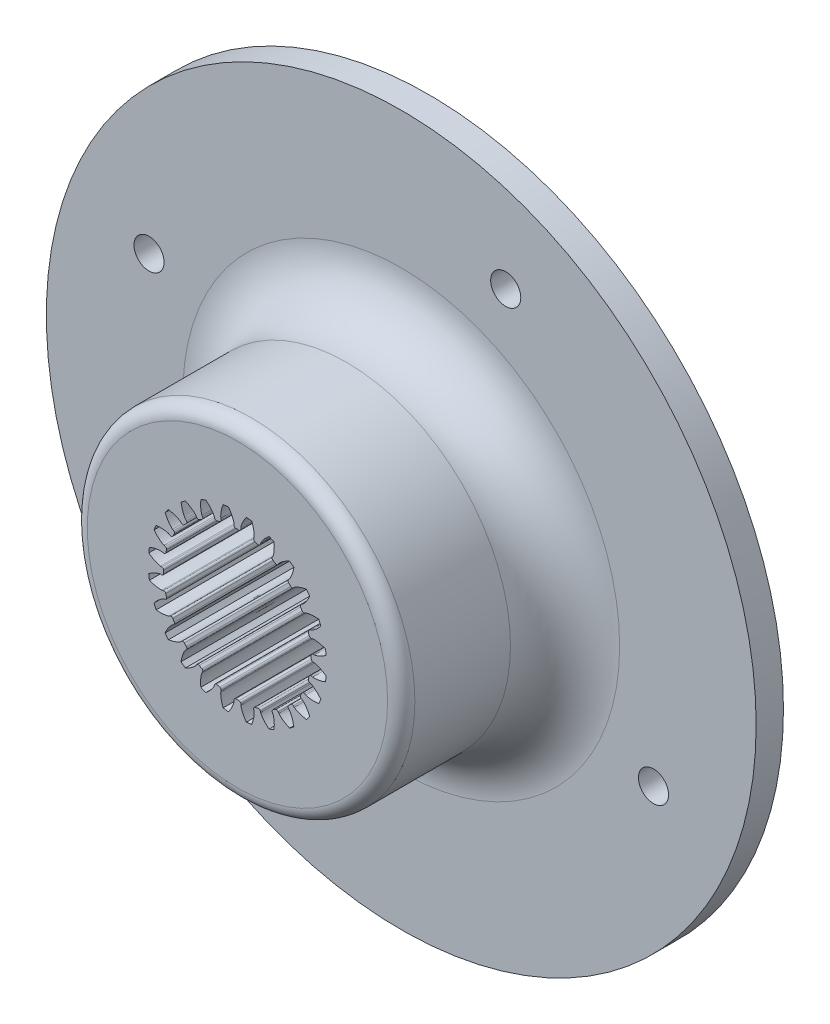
SolidWorks part; units mm, degrees
ref_plane "Front Plane" through (0, 0, 0) normal (0, 0, 1) x (1, 0, 0)
ref_plane "Top Plane" through (0, 0, 0) normal (0, 1, 0) x (1, 0, 0)
ref_plane "Right Plane" through (0, 0, 0) normal (1, 0, 0) x (0, 0, -1)
sketch "Sketch1" plane through (0, 0, 0) normal (0, 0, 1) x (1, 0, 0)
  circle A0 centre (300, 306.7878) radius 30 construction
  circle A1 centre (300, 306.7878) radius 30
  circle A2 centre (300, 306.7878) radius 82.55
  circle A3 centre (275.6996, 248.1215) radius 3.5 construction
  circle A4 centre (358.6664, 282.4874) radius 3.5 construction
  circle A5 centre (324.3004, 365.4542) radius 3.5 construction
  circle A6 centre (241.3336, 331.0882) radius 3.5 construction
  circle A7 centre (275.6996, 248.1215) radius 3.5
  circle A8 centre (358.6664, 282.4874) radius 3.5
  circle A9 centre (324.3004, 365.4542) radius 3.5
  circle A10 centre (241.3336, 331.0882) radius 3.5
  dimension "D1" = 165.1
extrude "Boss-Extrude1" add sketch "Sketch1" along normal blind 6.35 contours A1 | A2 A10 A9 A8 A7 A1
sketch "Sketch2" plane through (0, 0, 6.35) normal (0, 0, 1) x (1, 0, 0)
  line L0 (284.9144, 316.4266) -> (285.176, 316.2574)
  line L1 (284.3871, 314.891) -> (284.1098, 315.033)
  line L2 (282.9337, 312.1937) -> (283.2302, 312.098)
  line L3 (282.8218, 310.574) -> (282.5172, 310.6394)
  line L4 (282.1161, 307.5924) -> (282.4272, 307.5767)
  line L5 (282.4272, 305.999) -> (282.1161, 305.9832)
  line L6 (282.5172, 302.9363) -> (282.8218, 303.0016)
  line L7 (283.2302, 301.4777) -> (282.9337, 301.3819)
  line L8 (284.1098, 298.5427) -> (284.3871, 298.6846)
  line L9 (285.176, 297.3183) -> (284.9144, 297.1491)
  line L10 (286.7852, 294.7109) -> (287.0164, 294.9198)
  line L11 (288.132, 293.8042) -> (287.9231, 293.573)
  line L12 (290.3612, 291.7022) -> (290.5305, 291.9638)
  line L13 (291.8968, 291.1749) -> (291.7548, 290.8976)
  line L14 (294.5941, 289.7215) -> (294.6899, 290.018)
  line L15 (296.2138, 289.6097) -> (296.1485, 289.305)
  line L16 (299.1954, 288.9039) -> (299.2111, 289.2151)
  line L17 (300.7889, 289.2151) -> (300.8046, 288.9039)
  line L18 (303.8515, 289.305) -> (303.7862, 289.6097)
  line L19 (305.3101, 290.018) -> (305.4059, 289.7215)
  line L20 (308.2452, 290.8976) -> (308.1032, 291.1749)
  line L21 (309.4695, 291.9638) -> (309.6388, 291.7022)
  line L22 (312.0769, 293.573) -> (311.868, 293.8042)
  line L23 (312.9836, 294.9198) -> (313.2148, 294.7109)
  line L24 (315.0856, 297.1491) -> (314.824, 297.3183)
  line L25 (315.6129, 298.6846) -> (315.8902, 298.5427)
  line L26 (317.0663, 301.3819) -> (316.7698, 301.4777)
  line L27 (317.1782, 303.0016) -> (317.4828, 302.9363)
  line L28 (317.8839, 305.9832) -> (317.5728, 305.999)
  line L29 (317.5728, 307.5767) -> (317.8839, 307.5924)
  line L30 (317.4828, 310.6394) -> (317.1782, 310.574)
  line L31 (316.7698, 312.098) -> (317.0663, 312.1937)
  line L32 (315.8902, 315.033) -> (315.6129, 314.891)
  line L33 (314.824, 316.2574) -> (315.0856, 316.4266)
  line L34 (313.2148, 318.8647) -> (312.9836, 318.6558)
  line L35 (311.868, 319.7714) -> (312.0769, 320.0026)
  line L36 (309.6388, 321.8735) -> (309.4695, 321.6119)
  line L37 (308.1032, 322.4007) -> (308.2452, 322.6781)
  line L38 (305.4059, 323.8541) -> (305.3101, 323.5576)
  line L39 (303.7862, 323.966) -> (303.8515, 324.2706)
  line L40 (300.8046, 324.6718) -> (300.7889, 324.3606)
  line L41 (299.2111, 324.3606) -> (299.1954, 324.6718)
  line L42 (296.1485, 324.2706) -> (296.2138, 323.966)
  line L43 (294.6899, 323.5576) -> (294.5941, 323.8541)
  line L44 (291.7548, 322.6781) -> (291.8968, 322.4007)
  line L45 (290.5305, 321.6119) -> (290.3612, 321.8735)
  line L46 (287.9231, 320.0026) -> (288.132, 319.7714)
  line L47 (287.0164, 318.6558) -> (286.7852, 318.8647)
  line L48 (284.9692, 316.5102) -> (285.2303, 316.3413)
  line L49 (284.3416, 314.802) -> (284.0647, 314.9437)
  line L50 (282.965, 312.2887) -> (283.2609, 312.1931)
  line L51 (282.8009, 310.4762) -> (282.4968, 310.5414)
  line L52 (282.1217, 307.6923) -> (282.4323, 307.6765)
  line L53 (282.4323, 305.8991) -> (282.1217, 305.8834)
  line L54 (282.4968, 303.0342) -> (282.8009, 303.0994)
  line L55 (283.2609, 301.3825) -> (282.965, 301.287)
  line L56 (284.0647, 298.6319) -> (284.3416, 298.7736)
  line L57 (285.2303, 297.2343) -> (284.9692, 297.0654)
  line L58 (286.7186, 294.7855) -> (286.9493, 294.994)
  line L59 (288.2062, 293.7372) -> (287.9977, 293.5064)
  line L60 (290.2776, 291.757) -> (290.4465, 292.0181)
  line L61 (291.9858, 291.1294) -> (291.8441, 290.8526)
  line L62 (294.4991, 289.7528) -> (294.5947, 290.0487)
  line L63 (296.3116, 289.5887) -> (296.2464, 289.2846)
  line L64 (299.0956, 288.9095) -> (299.1113, 289.2201)
  line L65 (300.8887, 289.2201) -> (300.9044, 288.9095)
  line L66 (303.7536, 289.2846) -> (303.6884, 289.5887)
  line L67 (305.4053, 290.0487) -> (305.5009, 289.7528)
  line L68 (308.1559, 290.8526) -> (308.0142, 291.1294)
  line L69 (309.5535, 292.0181) -> (309.7224, 291.757)
  line L70 (312.0023, 293.5064) -> (311.7938, 293.7372)
  line L71 (313.0507, 294.994) -> (313.2814, 294.7855)
  line L72 (315.0308, 297.0654) -> (314.7697, 297.2343)
  line L73 (315.6584, 298.7736) -> (315.9353, 298.6319)
  line L74 (317.035, 301.287) -> (316.7391, 301.3825)
  line L75 (317.1991, 303.0994) -> (317.5032, 303.0342)
  line L76 (317.8783, 305.8834) -> (317.5677, 305.8991)
  line L77 (317.5677, 307.6765) -> (317.8783, 307.6923)
  line L78 (317.5032, 310.5414) -> (317.1991, 310.4762)
  line L79 (316.7391, 312.1931) -> (317.035, 312.2887)
  line L80 (315.9353, 314.9437) -> (315.6584, 314.802)
  line L81 (314.7697, 316.3413) -> (315.0308, 316.5102)
  line L82 (313.2814, 318.7901) -> (313.0507, 318.5816)
  line L83 (311.7938, 319.8385) -> (312.0023, 320.0692)
  line L84 (309.7224, 321.8187) -> (309.5535, 321.5575)
  line L85 (308.0142, 322.4463) -> (308.1559, 322.7231)
  line L86 (305.5009, 323.8228) -> (305.4053, 323.5269)
  line L87 (303.6884, 323.987) -> (303.7536, 324.291)
  line L88 (300.9044, 324.6661) -> (300.8887, 324.3555)
  line L89 (299.1113, 324.3555) -> (299.0956, 324.6661)
  line L90 (296.2464, 324.291) -> (296.3116, 323.987)
  line L91 (294.5947, 323.5269) -> (294.4991, 323.8228)
  line L92 (291.8441, 322.7231) -> (291.9858, 322.4463)
  line L93 (290.4465, 321.5575) -> (290.2776, 321.8187)
  line L94 (287.9977, 320.0692) -> (288.2062, 319.8385)
  line L95 (286.9493, 318.5816) -> (286.7186, 318.7901)
  line L96 (284.9692, 316.5102) -> (285.2303, 316.3413)
  line L97 (284.3416, 314.802) -> (284.0647, 314.9437)
  line L98 (282.965, 312.2887) -> (283.2609, 312.1931)
  line L99 (282.8009, 310.4762) -> (282.4968, 310.5414)
  line L100 (282.1217, 307.6923) -> (282.4323, 307.6765)
  line L101 (282.4323, 305.8991) -> (282.1217, 305.8834)
  line L102 (282.4968, 303.0342) -> (282.8009, 303.0994)
  line L103 (283.2609, 301.3825) -> (282.965, 301.287)
  line L104 (284.0647, 298.6319) -> (284.3416, 298.7736)
  line L105 (285.2303, 297.2343) -> (284.9692, 297.0654)
  line L106 (286.7186, 294.7855) -> (286.9493, 294.994)
  line L107 (288.2062, 293.7372) -> (287.9977, 293.5064)
  line L108 (290.2776, 291.757) -> (290.4465, 292.0181)
  line L109 (291.9858, 291.1294) -> (291.8441, 290.8526)
  line L110 (294.4991, 289.7528) -> (294.5947, 290.0487)
  line L111 (296.3116, 289.5887) -> (296.2464, 289.2846)
  line L112 (299.0956, 288.9095) -> (299.1113, 289.2201)
  line L113 (300.8887, 289.2201) -> (300.9044, 288.9095)
  line L114 (303.7536, 289.2846) -> (303.6884, 289.5887)
  line L115 (305.4053, 290.0487) -> (305.5009, 289.7528)
  line L116 (308.1559, 290.8526) -> (308.0142, 291.1294)
  line L117 (309.5535, 292.0181) -> (309.7224, 291.757)
  line L118 (312.0023, 293.5064) -> (311.7938, 293.7372)
  line L119 (313.0507, 294.994) -> (313.2814, 294.7855)
  line L120 (315.0308, 297.0654) -> (314.7697, 297.2343)
  line L121 (315.6584, 298.7736) -> (315.9353, 298.6319)
  line L122 (317.035, 301.287) -> (316.7391, 301.3825)
  line L123 (317.1991, 303.0994) -> (317.5032, 303.0342)
  line L124 (317.8783, 305.8834) -> (317.5677, 305.8991)
  line L125 (317.5677, 307.6765) -> (317.8783, 307.6923)
  line L126 (317.5032, 310.5414) -> (317.1991, 310.4762)
  line L127 (316.7391, 312.1931) -> (317.035, 312.2887)
  line L128 (315.9353, 314.9437) -> (315.6584, 314.802)
  line L129 (314.7697, 316.3413) -> (315.0308, 316.5102)
  line L130 (313.2814, 318.7901) -> (313.0507, 318.5816)
  line L131 (311.7938, 319.8385) -> (312.0023, 320.0692)
  line L132 (309.7224, 321.8187) -> (309.5535, 321.5575)
  line L133 (308.0142, 322.4463) -> (308.1559, 322.7231)
  line L134 (305.5009, 323.8228) -> (305.4053, 323.5269)
  line L135 (303.6884, 323.987) -> (303.7536, 324.291)
  line L136 (300.9044, 324.6661) -> (300.8887, 324.3555)
  line L137 (299.1113, 324.3555) -> (299.0956, 324.6661)
  line L138 (296.2464, 324.291) -> (296.3116, 323.987)
  line L139 (294.5947, 323.5269) -> (294.4991, 323.8228)
  line L140 (291.8441, 322.7231) -> (291.9858, 322.4463)
  line L141 (290.4465, 321.5575) -> (290.2776, 321.8187)
  line L142 (287.9977, 320.0692) -> (288.2062, 319.8385)
  line L143 (286.9493, 318.5816) -> (286.7186, 318.7901)
  circle A0 centre (300, 306.7878) radius 82.55 construction
  circle A1 centre (300, 306.7878) radius 82.55
  circle A2 centre (300, 306.7878) radius 44.45
  arc A3 (285.3112, 315.6703) -> (285.176, 316.2574) centre (284.941, 315.8941) ccw
  circle A4 centre (300, 306.7878) radius 38.1
  circle A6 centre (324.3004, 365.4542) radius 19.05
  arc A7 (285.3112, 315.6703) -> (284.9632, 315.0675) centre (300, 306.7878) ccw
  arc A8 (284.3871, 314.891) -> (284.9632, 315.0675) centre (284.5842, 315.2761) ccw
  arc A9 (281.0904, 315.3008) -> (280.6093, 314.1393) centre (300, 306.7878) ccw
  arc A10 (283.5128, 311.5659) -> (283.2302, 312.098) centre (283.0972, 311.6863) ccw
  arc A11 (283.5128, 311.5659) -> (283.3326, 310.8935) centre (300, 306.7878) ccw
  arc A12 (282.8218, 310.574) -> (283.3326, 310.8935) centre (282.9126, 310.997) ccw
  arc A13 (279.5314, 310.1166) -> (279.3673, 308.8702) centre (300, 306.7878) ccw
  arc A14 (282.8379, 307.1358) -> (282.4272, 307.5767) centre (282.4054, 307.1446) ccw
  arc A15 (282.8379, 307.1358) -> (282.8379, 306.4398) centre (300, 306.7878) ccw
  arc A16 (282.4272, 305.999) -> (282.8379, 306.4398) centre (282.4054, 306.431) ccw
  arc A17 (279.3673, 304.7055) -> (279.5314, 303.4591) centre (300, 306.7878) ccw
  arc A18 (283.3326, 302.6821) -> (282.8218, 303.0016) centre (282.9126, 302.5786) ccw
  arc A19 (283.3326, 302.6821) -> (283.5128, 302.0098) centre (300, 306.7878) ccw
  arc A20 (283.2302, 301.4777) -> (283.5128, 302.0098) centre (283.0972, 301.8894) ccw
  arc A21 (280.6093, 299.4363) -> (281.0904, 298.2748) centre (300, 306.7878) ccw
  arc A22 (284.9632, 298.5082) -> (284.3871, 298.6846) centre (284.5842, 298.2995) ccw
  arc A23 (284.9632, 298.5082) -> (285.3112, 297.9054) centre (300, 306.7878) ccw
  arc A24 (285.176, 297.3183) -> (285.3112, 297.9054) centre (284.941, 297.6815) ccw
  arc A25 (283.1727, 294.6681) -> (283.9381, 293.6707) centre (300, 306.7878) ccw
  arc A26 (287.6185, 294.8985) -> (287.0164, 294.9198) centre (287.3064, 294.5988) ccw
  arc A27 (287.6185, 294.8985) -> (288.1107, 294.4063) centre (300, 306.7878) ccw
  arc A28 (288.132, 293.8042) -> (288.1107, 294.4063) centre (287.811, 294.0943) ccw
  arc A29 (286.8829, 290.7259) -> (287.8803, 289.9606) centre (300, 306.7878) ccw
  arc A30 (291.1176, 292.099) -> (290.5305, 291.9638) centre (290.8937, 291.7288) ccw
  arc A31 (291.1176, 292.099) -> (291.7203, 291.751) centre (300, 306.7878) ccw
  arc A32 (291.8968, 291.1749) -> (291.7203, 291.751) centre (291.5117, 291.372) ccw
  arc A33 (291.487, 287.8782) -> (292.6485, 287.3971) centre (300, 306.7878) ccw
  arc A34 (295.222, 290.3006) -> (294.6899, 290.018) centre (295.1015, 289.8851) ccw
  arc A35 (295.222, 290.3006) -> (295.8943, 290.1204) centre (300, 306.7878) ccw
  arc A36 (296.2138, 289.6097) -> (295.8943, 290.1204) centre (295.7908, 289.7004) ccw
  arc A37 (296.6712, 286.3192) -> (297.9177, 286.1551) centre (300, 306.7878) ccw
  arc A38 (299.652, 289.6257) -> (299.2111, 289.2151) centre (299.6432, 289.1932) ccw
  arc A39 (299.652, 289.6257) -> (300.348, 289.6257) centre (300, 306.7878) ccw
  arc A40 (300.7889, 289.2151) -> (300.348, 289.6257) centre (300.3568, 289.1932) ccw
  arc A41 (302.0823, 286.1551) -> (303.3288, 286.3192) centre (300, 306.7878) ccw
  arc A42 (304.1057, 290.1204) -> (303.7862, 289.6097) centre (304.2092, 289.7004) ccw
  arc A43 (304.1057, 290.1204) -> (304.778, 290.3006) centre (300, 306.7878) ccw
  arc A44 (305.3101, 290.018) -> (304.778, 290.3006) centre (304.8985, 289.8851) ccw
  arc A45 (307.3515, 287.3971) -> (308.513, 287.8782) centre (300, 306.7878) ccw
  arc A46 (308.2797, 291.751) -> (308.1032, 291.1749) centre (308.4883, 291.372) ccw
  arc A47 (308.2797, 291.751) -> (308.8824, 292.099) centre (300, 306.7878) ccw
  arc A48 (309.4695, 291.9638) -> (308.8824, 292.099) centre (309.1063, 291.7288) ccw
  arc A49 (312.1197, 289.9606) -> (313.1171, 290.7259) centre (300, 306.7878) ccw
  arc A50 (311.8893, 294.4063) -> (311.868, 293.8042) centre (312.189, 294.0943) ccw
  arc A51 (311.8893, 294.4063) -> (312.3815, 294.8985) centre (300, 306.7878) ccw
  arc A52 (312.9836, 294.9198) -> (312.3815, 294.8985) centre (312.6936, 294.5988) ccw
  arc A53 (316.0619, 293.6707) -> (316.8273, 294.6681) centre (300, 306.7878) ccw
  arc A54 (314.6888, 297.9054) -> (314.824, 297.3183) centre (315.059, 297.6815) ccw
  arc A55 (314.6888, 297.9054) -> (315.0368, 298.5082) centre (300, 306.7878) ccw
  arc A56 (315.6129, 298.6846) -> (315.0368, 298.5082) centre (315.4158, 298.2995) ccw
  arc A57 (318.9096, 298.2748) -> (319.3907, 299.4363) centre (300, 306.7878) ccw
  arc A58 (316.4872, 302.0098) -> (316.7698, 301.4777) centre (316.9028, 301.8894) ccw
  arc A59 (316.4872, 302.0098) -> (316.6674, 302.6821) centre (300, 306.7878) ccw
  arc A60 (317.1782, 303.0016) -> (316.6674, 302.6821) centre (317.0874, 302.5786) ccw
  arc A61 (320.4686, 303.4591) -> (320.6327, 304.7055) centre (300, 306.7878) ccw
  arc A62 (317.1621, 306.4398) -> (317.5728, 305.999) centre (317.5946, 306.431) ccw
  arc A63 (317.1621, 306.4398) -> (317.1621, 307.1358) centre (300, 306.7878) ccw
  arc A64 (317.5728, 307.5767) -> (317.1621, 307.1358) centre (317.5946, 307.1446) ccw
  arc A65 (320.6327, 308.8702) -> (320.4686, 310.1166) centre (300, 306.7878) ccw
  arc A66 (316.6674, 310.8935) -> (317.1782, 310.574) centre (317.0874, 310.997) ccw
  arc A67 (316.6674, 310.8935) -> (316.4872, 311.5659) centre (300, 306.7878) ccw
  arc A68 (316.7698, 312.098) -> (316.4872, 311.5659) centre (316.9028, 311.6863) ccw
  arc A69 (319.3907, 314.1393) -> (318.9096, 315.3008) centre (300, 306.7878) ccw
  arc A70 (315.0368, 315.0675) -> (315.6129, 314.891) centre (315.4158, 315.2761) ccw
  arc A71 (315.0368, 315.0675) -> (314.6888, 315.6703) centre (300, 306.7878) ccw
  arc A72 (314.824, 316.2574) -> (314.6888, 315.6703) centre (315.059, 315.8941) ccw
  arc A73 (316.8273, 318.9075) -> (316.0619, 319.9049) centre (300, 306.7878) ccw
  arc A74 (312.3815, 318.6772) -> (312.9836, 318.6558) centre (312.6936, 318.9768) ccw
  arc A75 (312.3815, 318.6772) -> (311.8893, 319.1693) centre (300, 306.7878) ccw
  arc A76 (311.868, 319.7714) -> (311.8893, 319.1693) centre (312.189, 319.4814) ccw
  arc A77 (313.1171, 322.8498) -> (312.1197, 323.6151) centre (300, 306.7878) ccw
  arc A78 (308.8824, 321.4766) -> (309.4695, 321.6119) centre (309.1063, 321.8468) ccw
  arc A79 (308.8824, 321.4766) -> (308.2797, 321.8246) centre (300, 306.7878) ccw
  arc A80 (308.1032, 322.4007) -> (308.2797, 321.8246) centre (308.4883, 322.2036) ccw
  arc A81 (308.513, 325.6974) -> (307.3515, 326.1785) centre (300, 306.7878) ccw
  arc A82 (304.778, 323.2751) -> (305.3101, 323.5576) centre (304.8985, 323.6906) ccw
  arc A83 (304.778, 323.2751) -> (304.1057, 323.4552) centre (300, 306.7878) ccw
  arc A84 (303.7862, 323.966) -> (304.1057, 323.4552) centre (304.2092, 323.8753) ccw
  arc A85 (303.3288, 327.2564) -> (302.0823, 327.4205) centre (300, 306.7878) ccw
  arc A86 (300.348, 323.9499) -> (300.7889, 324.3606) centre (300.3568, 324.3824) ccw
  arc A87 (300.348, 323.9499) -> (299.652, 323.9499) centre (300, 306.7878) ccw
  arc A88 (299.2111, 324.3606) -> (299.652, 323.9499) centre (299.6432, 324.3824) ccw
  arc A89 (297.9177, 327.4205) -> (296.6712, 327.2564) centre (300, 306.7878) ccw
  arc A90 (295.8943, 323.4552) -> (296.2138, 323.966) centre (295.7908, 323.8753) ccw
  arc A91 (295.8943, 323.4552) -> (295.222, 323.2751) centre (300, 306.7878) ccw
  arc A92 (294.6899, 323.5576) -> (295.222, 323.2751) centre (295.1015, 323.6906) ccw
  arc A93 (292.6485, 326.1785) -> (291.487, 325.6974) centre (300, 306.7878) ccw
  arc A94 (291.7203, 321.8246) -> (291.8968, 322.4007) centre (291.5117, 322.2036) ccw
  arc A95 (291.7203, 321.8246) -> (291.1176, 321.4766) centre (300, 306.7878) ccw
  arc A96 (290.5305, 321.6119) -> (291.1176, 321.4766) centre (290.8937, 321.8468) ccw
  arc A97 (287.8803, 323.6151) -> (286.8829, 322.8498) centre (300, 306.7878) ccw
  arc A98 (288.1107, 319.1693) -> (288.132, 319.7714) centre (287.811, 319.4814) ccw
  arc A99 (288.1107, 319.1693) -> (287.6185, 318.6772) centre (300, 306.7878) ccw
  arc A100 (287.0164, 318.6558) -> (287.6185, 318.6772) centre (287.3064, 318.9768) ccw
  arc A101 (283.9381, 319.9049) -> (283.1727, 318.9075) centre (300, 306.7878) ccw
  arc A103 (283.9791, 319.7969) -> (283.2877, 318.8958) centre (300, 306.7878) ccw
  arc A104 (285.3968, 315.6185) -> (285.2303, 316.3413) centre (284.941, 315.8941) ccw
  arc A105 (285.3968, 315.6185) -> (285.0508, 315.0192) centre (300, 306.7878) ccw
  arc A106 (284.3416, 314.802) -> (285.0508, 315.0192) centre (284.5842, 315.2761) ccw
  arc A107 (281.158, 315.2071) -> (280.7233, 314.1578) centre (300, 306.7878) ccw
  arc A108 (283.6088, 311.538) -> (283.2609, 312.1931) centre (283.0972, 311.6863) ccw
  arc A109 (283.6088, 311.538) -> (283.4297, 310.8696) centre (300, 306.7878) ccw
  arc A110 (282.8009, 310.4762) -> (283.4297, 310.8696) centre (282.9126, 310.997) ccw
  arc A111 (279.6209, 310.0436) -> (279.4727, 308.9175) centre (300, 306.7878) ccw
  arc A112 (282.9379, 307.1338) -> (282.4323, 307.6765) centre (282.4054, 307.1446) ccw
  arc A113 (282.9379, 307.1338) -> (282.9379, 306.4418) centre (300, 306.7878) ccw
  arc A114 (282.4323, 305.8991) -> (282.9379, 306.4418) centre (282.4054, 306.431) ccw
  arc A115 (279.4727, 304.6581) -> (279.6209, 303.5321) centre (300, 306.7878) ccw
  arc A116 (283.4297, 302.706) -> (282.8009, 303.0994) centre (282.9126, 302.5786) ccw
  arc A117 (283.4297, 302.706) -> (283.6088, 302.0376) centre (300, 306.7878) ccw
  arc A118 (283.2609, 301.3825) -> (283.6088, 302.0376) centre (283.0972, 301.8894) ccw
  arc A119 (280.7233, 299.4179) -> (281.158, 298.3685) centre (300, 306.7878) ccw
  arc A120 (285.0508, 298.5564) -> (284.3416, 298.7736) centre (284.5842, 298.2995) ccw
  arc A121 (285.0508, 298.5564) -> (285.3968, 297.9571) centre (300, 306.7878) ccw
  arc A122 (285.2303, 297.2343) -> (285.3968, 297.9571) centre (284.941, 297.6815) ccw
  arc A123 (283.2877, 294.6798) -> (283.9791, 293.7787) centre (300, 306.7878) ccw
  arc A124 (287.6906, 294.9677) -> (286.9493, 294.994) centre (287.3064, 294.5988) ccw
  arc A125 (287.6906, 294.9677) -> (288.1799, 294.4784) centre (300, 306.7878) ccw
  arc A126 (288.2062, 293.7372) -> (288.1799, 294.4784) centre (287.811, 294.0943) ccw
  arc A127 (286.9909, 290.7669) -> (287.892, 290.0755) centre (300, 306.7878) ccw
  arc A128 (291.1693, 292.1846) -> (290.4465, 292.0181) centre (290.8937, 291.7288) ccw
  arc A129 (291.1693, 292.1846) -> (291.7686, 291.8386) centre (300, 306.7878) ccw
  arc A130 (291.9858, 291.1294) -> (291.7686, 291.8386) centre (291.5117, 291.372) ccw
  arc A131 (291.5807, 287.9458) -> (292.63, 287.5112) centre (300, 306.7878) ccw
  arc A132 (295.2498, 290.3966) -> (294.5947, 290.0487) centre (295.1015, 289.8851) ccw
  arc A133 (295.2498, 290.3966) -> (295.9182, 290.2175) centre (300, 306.7878) ccw
  arc A134 (296.3116, 289.5887) -> (295.9182, 290.2175) centre (295.7908, 289.7004) ccw
  arc A135 (296.7442, 286.4088) -> (297.8703, 286.2605) centre (300, 306.7878) ccw
  arc A136 (299.654, 289.7257) -> (299.1113, 289.2201) centre (299.6432, 289.1932) ccw
  arc A137 (299.654, 289.7257) -> (300.346, 289.7257) centre (300, 306.7878) ccw
  arc A138 (300.8887, 289.2201) -> (300.346, 289.7257) centre (300.3568, 289.1932) ccw
  arc A139 (302.1297, 286.2605) -> (303.2558, 286.4088) centre (300, 306.7878) ccw
  arc A140 (304.0818, 290.2175) -> (303.6884, 289.5887) centre (304.2092, 289.7004) ccw
  arc A141 (304.0818, 290.2175) -> (304.7502, 290.3966) centre (300, 306.7878) ccw
  arc A142 (305.4053, 290.0487) -> (304.7502, 290.3966) centre (304.8985, 289.8851) ccw
  arc A143 (307.37, 287.5112) -> (308.4193, 287.9458) centre (300, 306.7878) ccw
  arc A144 (308.2314, 291.8386) -> (308.0142, 291.1294) centre (308.4883, 291.372) ccw
  arc A145 (308.2314, 291.8386) -> (308.8307, 292.1846) centre (300, 306.7878) ccw
  arc A146 (309.5535, 292.0181) -> (308.8307, 292.1846) centre (309.1063, 291.7288) ccw
  arc A147 (312.108, 290.0755) -> (313.0091, 290.7669) centre (300, 306.7878) ccw
  arc A148 (311.8201, 294.4784) -> (311.7938, 293.7372) centre (312.189, 294.0943) ccw
  arc A149 (311.8201, 294.4784) -> (312.3094, 294.9677) centre (300, 306.7878) ccw
  arc A150 (313.0507, 294.994) -> (312.3094, 294.9677) centre (312.6936, 294.5988) ccw
  arc A151 (316.0209, 293.7787) -> (316.7123, 294.6798) centre (300, 306.7878) ccw
  arc A152 (314.6032, 297.9571) -> (314.7697, 297.2343) centre (315.059, 297.6815) ccw
  arc A153 (314.6032, 297.9571) -> (314.9492, 298.5564) centre (300, 306.7878) ccw
  arc A154 (315.6584, 298.7736) -> (314.9492, 298.5564) centre (315.4158, 298.2995) ccw
  arc A155 (318.842, 298.3685) -> (319.2767, 299.4179) centre (300, 306.7878) ccw
  arc A156 (316.3912, 302.0376) -> (316.7391, 301.3825) centre (316.9028, 301.8894) ccw
  arc A157 (316.3912, 302.0376) -> (316.5703, 302.706) centre (300, 306.7878) ccw
  arc A158 (317.1991, 303.0994) -> (316.5703, 302.706) centre (317.0874, 302.5786) ccw
  arc A159 (320.3791, 303.5321) -> (320.5273, 304.6581) centre (300, 306.7878) ccw
  arc A160 (317.0621, 306.4418) -> (317.5677, 305.8991) centre (317.5946, 306.431) ccw
  arc A161 (317.0621, 306.4418) -> (317.0621, 307.1338) centre (300, 306.7878) ccw
  arc A162 (317.5677, 307.6765) -> (317.0621, 307.1338) centre (317.5946, 307.1446) ccw
  arc A163 (320.5273, 308.9175) -> (320.3791, 310.0436) centre (300, 306.7878) ccw
  arc A164 (316.5703, 310.8696) -> (317.1991, 310.4762) centre (317.0874, 310.997) ccw
  arc A165 (316.5703, 310.8696) -> (316.3912, 311.538) centre (300, 306.7878) ccw
  arc A166 (316.7391, 312.1931) -> (316.3912, 311.538) centre (316.9028, 311.6863) ccw
  arc A167 (319.2767, 314.1578) -> (318.842, 315.2071) centre (300, 306.7878) ccw
  arc A168 (314.9492, 315.0192) -> (315.6584, 314.802) centre (315.4158, 315.2761) ccw
  arc A169 (314.9492, 315.0192) -> (314.6032, 315.6185) centre (300, 306.7878) ccw
  arc A170 (314.7697, 316.3413) -> (314.6032, 315.6185) centre (315.059, 315.8941) ccw
  arc A171 (316.7123, 318.8958) -> (316.0209, 319.7969) centre (300, 306.7878) ccw
  arc A172 (312.3094, 318.6079) -> (313.0507, 318.5816) centre (312.6936, 318.9768) ccw
  arc A173 (312.3094, 318.6079) -> (311.8201, 319.0972) centre (300, 306.7878) ccw
  arc A174 (311.7938, 319.8385) -> (311.8201, 319.0972) centre (312.189, 319.4814) ccw
  arc A175 (313.0091, 322.8087) -> (312.108, 323.5002) centre (300, 306.7878) ccw
  arc A176 (308.8307, 321.3911) -> (309.5535, 321.5575) centre (309.1063, 321.8468) ccw
  arc A177 (308.8307, 321.3911) -> (308.2314, 321.737) centre (300, 306.7878) ccw
  arc A178 (308.0142, 322.4463) -> (308.2314, 321.737) centre (308.4883, 322.2036) ccw
  arc A179 (308.4193, 325.6298) -> (307.37, 326.0645) centre (300, 306.7878) ccw
  arc A180 (304.7502, 323.179) -> (305.4053, 323.5269) centre (304.8985, 323.6906) ccw
  arc A181 (304.7502, 323.179) -> (304.0818, 323.3581) centre (300, 306.7878) ccw
  arc A182 (303.6884, 323.987) -> (304.0818, 323.3581) centre (304.2092, 323.8753) ccw
  arc A183 (303.2558, 327.1669) -> (302.1297, 327.3151) centre (300, 306.7878) ccw
  arc A184 (300.346, 323.8499) -> (300.8887, 324.3555) centre (300.3568, 324.3824) ccw
  arc A185 (300.346, 323.8499) -> (299.654, 323.8499) centre (300, 306.7878) ccw
  arc A186 (299.1113, 324.3555) -> (299.654, 323.8499) centre (299.6432, 324.3824) ccw
  arc A187 (297.8703, 327.3151) -> (296.7442, 327.1669) centre (300, 306.7878) ccw
  arc A188 (295.9182, 323.3581) -> (296.3116, 323.987) centre (295.7908, 323.8753) ccw
  arc A189 (295.9182, 323.3581) -> (295.2498, 323.179) centre (300, 306.7878) ccw
  arc A190 (294.5947, 323.5269) -> (295.2498, 323.179) centre (295.1015, 323.6906) ccw
  arc A191 (292.63, 326.0645) -> (291.5807, 325.6298) centre (300, 306.7878) ccw
  arc A192 (291.7686, 321.737) -> (291.9858, 322.4463) centre (291.5117, 322.2036) ccw
  arc A193 (291.7686, 321.737) -> (291.1693, 321.3911) centre (300, 306.7878) ccw
  arc A194 (290.4465, 321.5575) -> (291.1693, 321.3911) centre (290.8937, 321.8468) ccw
  arc A195 (287.892, 323.5002) -> (286.9909, 322.8087) centre (300, 306.7878) ccw
  arc A196 (288.1799, 319.0972) -> (288.2062, 319.8385) centre (287.811, 319.4814) ccw
  arc A197 (288.1799, 319.0972) -> (287.6906, 318.6079) centre (300, 306.7878) ccw
  arc A198 (286.9493, 318.5816) -> (287.6906, 318.6079) centre (287.3064, 318.9768) ccw
  arc A199 (283.9791, 319.7969) -> (283.2877, 318.8958) centre (300, 306.7878) ccw
  arc A200 (285.3968, 315.6185) -> (285.2303, 316.3413) centre (284.941, 315.8941) ccw
  arc A201 (285.3968, 315.6185) -> (285.0508, 315.0192) centre (300, 306.7878) ccw
  arc A202 (284.3416, 314.802) -> (285.0508, 315.0192) centre (284.5842, 315.2761) ccw
  arc A203 (281.158, 315.2071) -> (280.7233, 314.1578) centre (300, 306.7878) ccw
  arc A204 (283.6088, 311.538) -> (283.2609, 312.1931) centre (283.0972, 311.6863) ccw
  arc A205 (283.6088, 311.538) -> (283.4297, 310.8696) centre (300, 306.7878) ccw
  arc A206 (282.8009, 310.4762) -> (283.4297, 310.8696) centre (282.9126, 310.997) ccw
  arc A207 (279.6209, 310.0436) -> (279.4727, 308.9175) centre (300, 306.7878) ccw
  arc A208 (282.9379, 307.1338) -> (282.4323, 307.6765) centre (282.4054, 307.1446) ccw
  arc A209 (282.9379, 307.1338) -> (282.9379, 306.4418) centre (300, 306.7878) ccw
  arc A210 (282.4323, 305.8991) -> (282.9379, 306.4418) centre (282.4054, 306.431) ccw
  arc A211 (279.4727, 304.6581) -> (279.6209, 303.5321) centre (300, 306.7878) ccw
  arc A212 (283.4297, 302.706) -> (282.8009, 303.0994) centre (282.9126, 302.5786) ccw
  arc A213 (283.4297, 302.706) -> (283.6088, 302.0376) centre (300, 306.7878) ccw
  arc A214 (283.2609, 301.3825) -> (283.6088, 302.0376) centre (283.0972, 301.8894) ccw
  arc A215 (280.7233, 299.4179) -> (281.158, 298.3685) centre (300, 306.7878) ccw
  arc A216 (285.0508, 298.5564) -> (284.3416, 298.7736) centre (284.5842, 298.2995) ccw
  arc A217 (285.0508, 298.5564) -> (285.3968, 297.9571) centre (300, 306.7878) ccw
  arc A218 (285.2303, 297.2343) -> (285.3968, 297.9571) centre (284.941, 297.6815) ccw
  arc A219 (283.2877, 294.6798) -> (283.9791, 293.7787) centre (300, 306.7878) ccw
  arc A220 (287.6906, 294.9677) -> (286.9493, 294.994) centre (287.3064, 294.5988) ccw
  arc A221 (287.6906, 294.9677) -> (288.1799, 294.4784) centre (300, 306.7878) ccw
  arc A222 (288.2062, 293.7372) -> (288.1799, 294.4784) centre (287.811, 294.0943) ccw
  arc A223 (286.9909, 290.7669) -> (287.892, 290.0755) centre (300, 306.7878) ccw
  arc A224 (291.1693, 292.1846) -> (290.4465, 292.0181) centre (290.8937, 291.7288) ccw
  arc A225 (291.1693, 292.1846) -> (291.7686, 291.8386) centre (300, 306.7878) ccw
  arc A226 (291.9858, 291.1294) -> (291.7686, 291.8386) centre (291.5117, 291.372) ccw
  arc A227 (291.5807, 287.9458) -> (292.63, 287.5112) centre (300, 306.7878) ccw
  arc A228 (295.2498, 290.3966) -> (294.5947, 290.0487) centre (295.1015, 289.8851) ccw
  arc A229 (295.2498, 290.3966) -> (295.9182, 290.2175) centre (300, 306.7878) ccw
  arc A230 (296.3116, 289.5887) -> (295.9182, 290.2175) centre (295.7908, 289.7004) ccw
  arc A231 (296.7442, 286.4088) -> (297.8703, 286.2605) centre (300, 306.7878) ccw
  arc A232 (299.654, 289.7257) -> (299.1113, 289.2201) centre (299.6432, 289.1932) ccw
  arc A233 (299.654, 289.7257) -> (300.346, 289.7257) centre (300, 306.7878) ccw
  arc A234 (300.8887, 289.2201) -> (300.346, 289.7257) centre (300.3568, 289.1932) ccw
  arc A235 (302.1297, 286.2605) -> (303.2558, 286.4088) centre (300, 306.7878) ccw
  arc A236 (304.0818, 290.2175) -> (303.6884, 289.5887) centre (304.2092, 289.7004) ccw
  arc A237 (304.0818, 290.2175) -> (304.7502, 290.3966) centre (300, 306.7878) ccw
  arc A238 (305.4053, 290.0487) -> (304.7502, 290.3966) centre (304.8985, 289.8851) ccw
  arc A239 (307.37, 287.5112) -> (308.4193, 287.9458) centre (300, 306.7878) ccw
  arc A240 (308.2314, 291.8386) -> (308.0142, 291.1294) centre (308.4883, 291.372) ccw
  arc A241 (308.2314, 291.8386) -> (308.8307, 292.1846) centre (300, 306.7878) ccw
  arc A242 (309.5535, 292.0181) -> (308.8307, 292.1846) centre (309.1063, 291.7288) ccw
  arc A243 (312.108, 290.0755) -> (313.0091, 290.7669) centre (300, 306.7878) ccw
  arc A244 (311.8201, 294.4784) -> (311.7938, 293.7372) centre (312.189, 294.0943) ccw
  arc A245 (311.8201, 294.4784) -> (312.3094, 294.9677) centre (300, 306.7878) ccw
  arc A246 (313.0507, 294.994) -> (312.3094, 294.9677) centre (312.6936, 294.5988) ccw
  arc A247 (316.0209, 293.7787) -> (316.7123, 294.6798) centre (300, 306.7878) ccw
  arc A248 (314.6032, 297.9571) -> (314.7697, 297.2343) centre (315.059, 297.6815) ccw
  arc A249 (314.6032, 297.9571) -> (314.9492, 298.5564) centre (300, 306.7878) ccw
  arc A250 (315.6584, 298.7736) -> (314.9492, 298.5564) centre (315.4158, 298.2995) ccw
  arc A251 (318.842, 298.3685) -> (319.2767, 299.4179) centre (300, 306.7878) ccw
  arc A252 (316.3912, 302.0376) -> (316.7391, 301.3825) centre (316.9028, 301.8894) ccw
  arc A253 (316.3912, 302.0376) -> (316.5703, 302.706) centre (300, 306.7878) ccw
  arc A254 (317.1991, 303.0994) -> (316.5703, 302.706) centre (317.0874, 302.5786) ccw
  arc A255 (320.3791, 303.5321) -> (320.5273, 304.6581) centre (300, 306.7878) ccw
  arc A256 (317.0621, 306.4418) -> (317.5677, 305.8991) centre (317.5946, 306.431) ccw
  arc A257 (317.0621, 306.4418) -> (317.0621, 307.1338) centre (300, 306.7878) ccw
  arc A258 (317.5677, 307.6765) -> (317.0621, 307.1338) centre (317.5946, 307.1446) ccw
  arc A259 (320.5273, 308.9175) -> (320.3791, 310.0436) centre (300, 306.7878) ccw
  arc A260 (316.5703, 310.8696) -> (317.1991, 310.4762) centre (317.0874, 310.997) ccw
  arc A261 (316.5703, 310.8696) -> (316.3912, 311.538) centre (300, 306.7878) ccw
  arc A262 (316.7391, 312.1931) -> (316.3912, 311.538) centre (316.9028, 311.6863) ccw
  arc A263 (319.2767, 314.1578) -> (318.842, 315.2071) centre (300, 306.7878) ccw
  arc A264 (314.9492, 315.0192) -> (315.6584, 314.802) centre (315.4158, 315.2761) ccw
  arc A265 (314.9492, 315.0192) -> (314.6032, 315.6185) centre (300, 306.7878) ccw
  arc A266 (314.7697, 316.3413) -> (314.6032, 315.6185) centre (315.059, 315.8941) ccw
  arc A267 (316.7123, 318.8958) -> (316.0209, 319.7969) centre (300, 306.7878) ccw
  arc A268 (312.3094, 318.6079) -> (313.0507, 318.5816) centre (312.6936, 318.9768) ccw
  arc A269 (312.3094, 318.6079) -> (311.8201, 319.0972) centre (300, 306.7878) ccw
  arc A270 (311.7938, 319.8385) -> (311.8201, 319.0972) centre (312.189, 319.4814) ccw
  arc A271 (313.0091, 322.8087) -> (312.108, 323.5002) centre (300, 306.7878) ccw
  arc A272 (308.8307, 321.3911) -> (309.5535, 321.5575) centre (309.1063, 321.8468) ccw
  arc A273 (308.8307, 321.3911) -> (308.2314, 321.737) centre (300, 306.7878) ccw
  arc A274 (308.0142, 322.4463) -> (308.2314, 321.737) centre (308.4883, 322.2036) ccw
  arc A275 (308.4193, 325.6298) -> (307.37, 326.0645) centre (300, 306.7878) ccw
  arc A276 (304.7502, 323.179) -> (305.4053, 323.5269) centre (304.8985, 323.6906) ccw
  arc A277 (304.7502, 323.179) -> (304.0818, 323.3581) centre (300, 306.7878) ccw
  arc A278 (303.6884, 323.987) -> (304.0818, 323.3581) centre (304.2092, 323.8753) ccw
  arc A279 (303.2558, 327.1669) -> (302.1297, 327.3151) centre (300, 306.7878) ccw
  arc A280 (300.346, 323.8499) -> (300.8887, 324.3555) centre (300.3568, 324.3824) ccw
  arc A281 (300.346, 323.8499) -> (299.654, 323.8499) centre (300, 306.7878) ccw
  arc A282 (299.1113, 324.3555) -> (299.654, 323.8499) centre (299.6432, 324.3824) ccw
  arc A283 (297.8703, 327.3151) -> (296.7442, 327.1669) centre (300, 306.7878) ccw
  arc A284 (295.9182, 323.3581) -> (296.3116, 323.987) centre (295.7908, 323.8753) ccw
  arc A285 (295.9182, 323.3581) -> (295.2498, 323.179) centre (300, 306.7878) ccw
  arc A286 (294.5947, 323.5269) -> (295.2498, 323.179) centre (295.1015, 323.6906) ccw
  arc A287 (292.63, 326.0645) -> (291.5807, 325.6298) centre (300, 306.7878) ccw
  arc A288 (291.7686, 321.737) -> (291.9858, 322.4463) centre (291.5117, 322.2036) ccw
  arc A289 (291.7686, 321.737) -> (291.1693, 321.3911) centre (300, 306.7878) ccw
  arc A290 (290.4465, 321.5575) -> (291.1693, 321.3911) centre (290.8937, 321.8468) ccw
  arc A291 (287.892, 323.5002) -> (286.9909, 322.8087) centre (300, 306.7878) ccw
  arc A292 (288.1799, 319.0972) -> (288.2062, 319.8385) centre (287.811, 319.4814) ccw
  arc A293 (288.1799, 319.0972) -> (287.6906, 318.6079) centre (300, 306.7878) ccw
  arc A294 (286.9493, 318.5816) -> (287.6906, 318.6079) centre (287.3064, 318.9768) ccw
  spline S0 degree 1 poles (284.1098, 315.033) (281.0904, 315.3008) knots 0 0 1 1 construction
  spline S1 degree 1 poles (280.6093, 314.1393) (282.9337, 312.1937) knots 0 0 1 1 construction
  spline S2 degree 1 poles (282.5172, 310.6394) (279.5314, 310.1166) knots 0 0 1 1 construction
  spline S3 degree 1 poles (279.3673, 308.8702) (282.1161, 307.5924) knots 0 0 1 1 construction
  spline S4 degree 1 poles (282.1161, 305.9832) (279.3673, 304.7055) knots 0 0 1 1 construction
  spline S5 degree 1 poles (279.5314, 303.4591) (282.5172, 302.9363) knots 0 0 1 1 construction
  spline S6 degree 1 poles (282.9337, 301.3819) (280.6093, 299.4363) knots 0 0 1 1 construction
  spline S7 degree 1 poles (281.0904, 298.2748) (284.1098, 298.5427) knots 0 0 1 1 construction
  spline S8 degree 1 poles (284.9144, 297.1491) (283.1727, 294.6681) knots 0 0 1 1 construction
  spline S9 degree 1 poles (283.9381, 293.6707) (286.7852, 294.7109) knots 0 0 1 1 construction
  spline S10 degree 1 poles (287.9231, 293.573) (286.8829, 290.7259) knots 0 0 1 1 construction
  spline S11 degree 1 poles (287.8803, 289.9606) (290.3612, 291.7022) knots 0 0 1 1 construction
  spline S12 degree 1 poles (291.7548, 290.8976) (291.487, 287.8782) knots 0 0 1 1 construction
  spline S13 degree 1 poles (292.6485, 287.3971) (294.5941, 289.7215) knots 0 0 1 1 construction
  spline S14 degree 1 poles (296.1485, 289.305) (296.6712, 286.3192) knots 0 0 1 1 construction
  spline S15 degree 1 poles (297.9177, 286.1551) (299.1954, 288.9039) knots 0 0 1 1 construction
  spline S16 degree 1 poles (300.8046, 288.9039) (302.0823, 286.1551) knots 0 0 1 1 construction
  spline S17 degree 1 poles (303.3288, 286.3192) (303.8515, 289.305) knots 0 0 1 1 construction
  spline S18 degree 1 poles (305.4059, 289.7215) (307.3515, 287.3971) knots 0 0 1 1 construction
  spline S19 degree 1 poles (308.513, 287.8782) (308.2452, 290.8976) knots 0 0 1 1 construction
  spline S20 degree 1 poles (309.6388, 291.7022) (312.1197, 289.9606) knots 0 0 1 1 construction
  spline S21 degree 1 poles (313.1171, 290.7259) (312.0769, 293.573) knots 0 0 1 1 construction
  spline S22 degree 1 poles (313.2148, 294.7109) (316.0619, 293.6707) knots 0 0 1 1 construction
  spline S23 degree 1 poles (316.8273, 294.6681) (315.0856, 297.1491) knots 0 0 1 1 construction
  spline S24 degree 1 poles (315.8902, 298.5427) (318.9096, 298.2748) knots 0 0 1 1 construction
  spline S25 degree 1 poles (319.3907, 299.4363) (317.0663, 301.3819) knots 0 0 1 1 construction
  spline S26 degree 1 poles (317.4828, 302.9363) (320.4686, 303.4591) knots 0 0 1 1 construction
  spline S27 degree 1 poles (320.6327, 304.7055) (317.8839, 305.9832) knots 0 0 1 1 construction
  spline S28 degree 1 poles (317.8839, 307.5924) (320.6327, 308.8702) knots 0 0 1 1 construction
  spline S29 degree 1 poles (320.4686, 310.1166) (317.4828, 310.6394) knots 0 0 1 1 construction
  spline S30 degree 1 poles (317.0663, 312.1937) (319.3907, 314.1393) knots 0 0 1 1 construction
  spline S31 degree 1 poles (318.9096, 315.3008) (315.8902, 315.033) knots 0 0 1 1 construction
  spline S32 degree 1 poles (315.0856, 316.4266) (316.8273, 318.9075) knots 0 0 1 1 construction
  spline S33 degree 1 poles (316.0619, 319.9049) (313.2148, 318.8647) knots 0 0 1 1 construction
  spline S34 degree 1 poles (312.0769, 320.0026) (313.1171, 322.8498) knots 0 0 1 1 construction
  spline S35 degree 1 poles (312.1197, 323.6151) (309.6388, 321.8735) knots 0 0 1 1 construction
  spline S36 degree 1 poles (308.2452, 322.6781) (308.513, 325.6974) knots 0 0 1 1 construction
  spline S37 degree 1 poles (307.3515, 326.1785) (305.4059, 323.8541) knots 0 0 1 1 construction
  spline S38 degree 1 poles (303.8515, 324.2706) (303.3288, 327.2564) knots 0 0 1 1 construction
  spline S39 degree 1 poles (302.0823, 327.4205) (300.8046, 324.6718) knots 0 0 1 1 construction
  spline S40 degree 1 poles (299.1954, 324.6718) (297.9177, 327.4205) knots 0 0 1 1 construction
  spline S41 degree 1 poles (296.6712, 327.2564) (296.1485, 324.2706) knots 0 0 1 1 construction
  spline S42 degree 1 poles (294.5941, 323.8541) (292.6485, 326.1785) knots 0 0 1 1 construction
  spline S43 degree 1 poles (291.487, 325.6974) (291.7548, 322.6781) knots 0 0 1 1 construction
  spline S44 degree 1 poles (290.3612, 321.8735) (287.8803, 323.6151) knots 0 0 1 1 construction
  spline S45 degree 1 poles (286.8829, 322.8498) (287.9231, 320.0026) knots 0 0 1 1 construction
  spline S46 degree 1 poles (286.7852, 318.8647) (283.9381, 319.9049) knots 0 0 1 1 construction
  spline S47 degree 1 poles (283.1727, 318.9075) (284.9144, 316.4266) knots 0 0 1 1 construction
  spline S48 degree 4 poles (-4304.1616, -4964.3514) (253.7766, 278.9342) (287.5228, 317.3209) (287.3034, 318.3409) (286.6582, 318.8386) (286.6193, 318.867) (286.5679, 318.9024) (286.5062, 318.9426) (286.437, 318.9852) (286.3604, 319.0297) (286.2828, 319.0725) (286.2042, 319.1137) (286.125, 319.1534) (286.0279, 319.1999) (285.9099, 319.2535) (285.7696, 319.3127) (285.6079, 319.376) (285.4404, 319.4364) (285.2733, 319.4922) (285.1019, 319.5447) (284.9343, 319.5925) (284.7577, 319.6381) (284.5934, 319.678) (284.4067, 319.7181) (283.2741, 319.95) (277.995, 320.6283) (400.0742, 300.4846) (-6624.3473, 1442.2016) knots -0.959266 -0.959266 -0.959266 -0.959266 -0.959266 0.005377 0.015084 0.028532 0.04661 0.064855 0.092111 0.119476 0.146842 0.174209 0.201575 0.228941 0.256307 0.307035 0.361767 0.4165 0.471232 0.525964 0.580697 0.635429 0.690161 0.744894 0.799626 0.854358 2.326711 2.326711 2.326711 2.326711 2.326711 only from (286.7186, 318.7901) to (283.9791, 319.7969)
  spline S49 degree 4 poles (-2588.9747, 6701.5408) (331.9907, 211.7523) (280.9358, 324.4609) (282.9573, 319.5372) (283.4744, 318.5032) (283.5615, 318.3332) (283.6426, 318.1848) (283.7323, 318.0261) (283.8219, 317.8766) (283.9169, 317.7246) (284.0142, 317.5776) (284.1158, 317.4314) (284.2188, 317.2916) (284.3123, 317.1715) (284.3946, 317.0713) (284.4646, 316.9896) (284.5235, 316.9233) (284.5836, 316.8581) (284.6451, 316.7942) (284.7079, 316.7317) (284.7669, 316.676) (284.8217, 316.6267) (284.8693, 316.5863) (284.9067, 316.556) (285.5544, 316.0616) (286.5964, 316.1137) (314.9392, 358.6425) (4199.5431, 6117.8311) knots -1.417632 -1.417632 -1.417632 -1.417632 -1.417632 0.054733 0.109465 0.164197 0.21893 0.273662 0.328394 0.383127 0.437859 0.492591 0.547324 0.602056 0.652784 0.68015 0.707516 0.734882 0.762248 0.789615 0.81698 0.844236 0.862481 0.880559 0.894007 0.903714 1.868335 1.868335 1.868335 1.868335 1.868335 only from (283.2877, 318.8958) to (284.9692, 316.5102)
  spline S50 degree 4 poles (-2783.0073, -5976.3863) (262.5607, 267.9198) (285.2218, 313.7327) (284.7459, 314.6612) (283.9939, 314.9749) (283.9489, 314.9922) (283.8901, 315.0131) (283.8201, 315.036) (283.7423, 315.0592) (283.6568, 315.0824) (283.5707, 315.1036) (283.4842, 315.1231) (283.3973, 315.141) (283.2915, 315.1608) (283.1636, 315.1819) (283.0128, 315.2029) (282.8403, 315.2222) (282.6628, 315.2371) (282.4869, 315.2478) (282.3078, 315.2541) (282.1336, 315.2569) (281.9512, 315.2552) (281.7822, 315.2513) (281.5914, 315.2417) (280.4374, 315.1726) (275.1626, 314.4614) (398.2956, 326.6005) (-6682.2726, -388.6396) knots -0.959266 -0.959266 -0.959266 -0.959266 -0.959266 0.005377 0.015084 0.028532 0.04661 0.064855 0.092111 0.119476 0.146842 0.174209 0.201575 0.228941 0.256307 0.307035 0.361767 0.4165 0.471232 0.525964 0.580697 0.635429 0.690161 0.744894 0.799626 0.854358 2.326711 2.326711 2.326711 2.326711 2.326711 only from (284.0647, 314.9437) to (281.158, 315.2071)
  spline S51 degree 4 poles (-4145.6191, 5735.9232) (355.4977, 223.2704) (277.0112, 318.9246) (280.2382, 314.6918) (281.0054, 313.8269) (281.1335, 313.6852) (281.2502, 313.5629) (281.378, 313.4327) (281.5032, 313.3115) (281.6343, 313.1893) (281.7662, 313.0725) (281.9023, 312.9576) (282.0379, 312.8492) (282.1594, 312.7574) (282.2647, 312.682) (282.3536, 312.6211) (282.4276, 312.5723) (282.5026, 312.5249) (282.5785, 312.4791) (282.6553, 312.435) (282.7267, 312.3964) (282.7924, 312.3631) (282.8488, 312.3363) (282.8928, 312.3168) (283.6464, 312.0069) (284.6394, 312.3268) (301.0092, 360.7421) (2562.6608, 6929.1006) knots -1.417632 -1.417632 -1.417632 -1.417632 -1.417632 0.054733 0.109465 0.164197 0.21893 0.273662 0.328394 0.383127 0.437859 0.492591 0.547324 0.602056 0.652784 0.68015 0.707516 0.734882 0.762248 0.789615 0.81698 0.844236 0.862481 0.880559 0.894007 0.903714 1.868335 1.868335 1.868335 1.868335 1.868335 only from (280.7233, 314.1578) to (282.965, 312.2887)
  spline S52 degree 4 poles (-1051.7513, -6560.2334) (273.8962, 259.5541) (283.9279, 309.6712) (283.2279, 310.4448) (282.4203, 310.5532) (282.3724, 310.5583) (282.3102, 310.5633) (282.2366, 310.5673) (282.1554, 310.5695) (282.0669, 310.5698) (281.9782, 310.5681) (281.8896, 310.5645) (281.8011, 310.5593) (281.6938, 310.551) (281.5648, 310.5383) (281.4137, 310.5195) (281.242, 310.4935) (281.0667, 310.462) (280.8941, 310.4268) (280.7195, 310.3865) (280.5504, 310.3442) (280.3747, 310.2953) (280.2124, 310.2478) (280.0306, 310.1891) (278.9338, 309.8237) (274.0228, 307.7715) (389.8184, 351.3662) (-6264.3676, -2172.0886) knots -0.959266 -0.959266 -0.959266 -0.959266 -0.959266 0.005377 0.015084 0.028532 0.04661 0.064855 0.092111 0.119476 0.146842 0.174209 0.201575 0.228941 0.256307 0.307035 0.361767 0.4165 0.471232 0.525964 0.580697 0.635429 0.690161 0.744894 0.799626 0.854358 2.326711 2.326711 2.326711 2.326711 2.326711 only from (282.4968, 310.5414) to (279.6209, 310.0436)
  spline S53 degree 4 poles (-5399.3019, 4400.319) (375.2226, 240.48) (274.6533, 312.5611) (278.8659, 309.3078) (279.8307, 308.6709) (279.9912, 308.5672) (280.1356, 308.4792) (280.2927, 308.3866) (280.445, 308.3019) (280.6033, 308.2178) (280.7609, 308.1392) (280.9221, 308.0633) (281.0812, 307.9938) (281.2222, 307.9365) (281.3435, 307.8909) (281.4451, 307.8551) (281.5292, 307.8272) (281.6139, 307.8008) (281.6991, 307.7762) (281.7847, 307.7535) (281.8637, 307.7347) (281.9358, 307.7194) (281.9972, 307.7082) (282.0448, 307.7007) (282.8528, 307.5964) (283.7292, 308.1625) (287.0104, 359.1649) (771.5818, 7289.0704) knots -1.417632 -1.417632 -1.417632 -1.417632 -1.417632 0.054733 0.109465 0.164197 0.21893 0.273662 0.328394 0.383127 0.437859 0.492591 0.547324 0.602056 0.652784 0.68015 0.707516 0.734882 0.762248 0.789615 0.81698 0.844236 0.862481 0.880559 0.894007 0.903714 1.868335 1.868335 1.868335 1.868335 1.868335 only from (279.4727, 308.9175) to (282.1217, 307.6923)
  spline S54 degree 4 poles (771.6244, -6676.1042) (287.0106, 254.4074) (283.7293, 305.4131) (282.8529, 305.9793) (282.0448, 305.875) (281.9972, 305.8674) (281.9358, 305.8562) (281.8637, 305.841) (281.7847, 305.8222) (281.6991, 305.7995) (281.6139, 305.7749) (281.5292, 305.7485) (281.4451, 305.7205) (281.3435, 305.6848) (281.2222, 305.6391) (281.0812, 305.5819) (280.9221, 305.5123) (280.7609, 305.4365) (280.6033, 305.3578) (280.445, 305.2737) (280.2927, 305.1891) (280.1356, 305.0964) (279.9912, 305.0085) (279.8307, 304.9048) (278.8659, 304.2679) (274.6534, 301.0146) (375.2202, 373.0939) (-5399.1117, -3786.6063) knots -0.959266 -0.959266 -0.959266 -0.959266 -0.959266 0.005377 0.015084 0.028532 0.04661 0.064855 0.092111 0.119476 0.146842 0.174209 0.201575 0.228941 0.256307 0.307035 0.361767 0.4165 0.471232 0.525964 0.580697 0.635429 0.690161 0.744894 0.799626 0.854358 2.326711 2.326711 2.326711 2.326711 2.326711 only from (282.1217, 305.8834) to (279.4727, 304.6581)
  spline S55 degree 4 poles (-6264.5868, 2785.7474) (389.8211, 262.2084) (274.0228, 305.8042) (278.9338, 303.752) (280.0306, 303.3865) (280.2124, 303.3279) (280.3747, 303.2803) (280.5504, 303.2315) (280.7195, 303.1891) (280.8941, 303.1489) (281.0667, 303.1137) (281.242, 303.0821) (281.4137, 303.0561) (281.5648, 303.0373) (281.6938, 303.0247) (281.8011, 303.0164) (281.8896, 303.0112) (281.9782, 303.0076) (282.0669, 303.0059) (282.1554, 303.0061) (282.2366, 303.0084) (282.3102, 303.0123) (282.3724, 303.0174) (282.4203, 303.0224) (283.2278, 303.1308) (283.9278, 303.9045) (273.8968, 354.0182) (-1051.6347, 7173.2093) knots -1.417632 -1.417632 -1.417632 -1.417632 -1.417632 0.054733 0.109465 0.164197 0.21893 0.273662 0.328394 0.383127 0.437859 0.492591 0.547324 0.602056 0.652784 0.68015 0.707516 0.734882 0.762248 0.789615 0.81698 0.844236 0.862481 0.880559 0.894007 0.903714 1.868335 1.868335 1.868335 1.868335 1.868335 only from (279.6209, 303.5321) to (282.4968, 303.0342)
  spline S56 degree 4 poles (2562.8597, -6316.1026) (301.0103, 252.8303) (284.6395, 301.2488) (283.6464, 301.5688) (282.8928, 301.2589) (282.8488, 301.2393) (282.7924, 301.2126) (282.7267, 301.1792) (282.6553, 301.1406) (282.5785, 301.0965) (282.5026, 301.0507) (282.4276, 301.0033) (282.3536, 300.9545) (282.2647, 300.8937) (282.1594, 300.8182) (282.0379, 300.7264) (281.9023, 300.618) (281.7662, 300.5031) (281.6343, 300.3863) (281.5032, 300.2641) (281.378, 300.1429) (281.2502, 300.0128) (281.1335, 299.8905) (281.0054, 299.7488) (280.2382, 298.8839) (277.0113, 294.6512) (355.4958, 390.303) (-4145.4708, -5122.1659) knots -0.959266 -0.959266 -0.959266 -0.959266 -0.959266 0.005377 0.015084 0.028532 0.04661 0.064855 0.092111 0.119476 0.146842 0.174209 0.201575 0.228941 0.256307 0.307035 0.361767 0.4165 0.471232 0.525964 0.580697 0.635429 0.690161 0.744894 0.799626 0.854358 2.326711 2.326711 2.326711 2.326711 2.326711 only from (282.965, 301.287) to (280.7233, 299.4179)
  spline S57 degree 4 poles (-6682.5058, 1002.2388) (398.2986, 286.9749) (275.1625, 299.1143) (280.4374, 298.4031) (281.5914, 298.3339) (281.7822, 298.3244) (281.9512, 298.3204) (282.1336, 298.3187) (282.3078, 298.3216) (282.4869, 298.3279) (282.6628, 298.3386) (282.8403, 298.3535) (283.0128, 298.3728) (283.1636, 298.3937) (283.2915, 298.4149) (283.3973, 298.4347) (283.4842, 298.4525) (283.5707, 298.472) (283.6568, 298.4933) (283.7423, 298.5165) (283.8201, 298.5397) (283.8901, 298.5625) (283.9489, 298.5835) (283.9939, 298.6008) (284.7458, 298.9145) (285.2218, 299.8429) (262.5622, 345.6529) (-2782.7394, 6589.4129) knots -1.417632 -1.417632 -1.417632 -1.417632 -1.417632 0.054733 0.109465 0.164197 0.21893 0.273662 0.328394 0.383127 0.437859 0.492591 0.547324 0.602056 0.652784 0.68015 0.707516 0.734882 0.762248 0.789615 0.81698 0.844236 0.862481 0.880559 0.894007 0.903714 1.868335 1.868335 1.868335 1.868335 1.868335 only from (281.158, 298.3685) to (284.0647, 298.6319)
  spline S58 degree 4 poles (4199.8848, -5504.7619) (314.9411, 254.9304) (286.5965, 297.4619) (285.5544, 297.514) (284.9067, 297.0196) (284.8693, 296.9893) (284.8217, 296.9489) (284.7669, 296.8997) (284.7079, 296.8439) (284.6451, 296.7814) (284.5836, 296.7175) (284.5235, 296.6523) (284.4646, 296.5861) (284.3946, 296.5043) (284.3123, 296.4041) (284.2188, 296.284) (284.1158, 296.1442) (284.0142, 295.998) (283.9169, 295.851) (283.8219, 295.6991) (283.7323, 295.5496) (283.6426, 295.3908) (283.5615, 295.2425) (283.4744, 295.0724) (282.9573, 294.0384) (280.9358, 289.1148) (331.9895, 401.8207) (-2588.8785, -6087.7513) knots -0.959266 -0.959266 -0.959266 -0.959266 -0.959266 0.005377 0.015084 0.028532 0.04661 0.064855 0.092111 0.119476 0.146842 0.174209 0.201575 0.228941 0.256307 0.307035 0.361767 0.4165 0.471232 0.525964 0.580697 0.635429 0.690161 0.744894 0.799626 0.854358 2.326711 2.326711 2.326711 2.326711 2.326711 only from (284.9692, 297.0654) to (283.2877, 294.6798)
  spline S59 degree 4 poles (-6624.5787, -828.6636) (400.0771, 313.0915) (277.9949, 292.9473) (283.2741, 293.6256) (284.4067, 293.8575) (284.5934, 293.8976) (284.7577, 293.9376) (284.9343, 293.9831) (285.1019, 294.031) (285.2733, 294.0834) (285.4404, 294.1393) (285.6079, 294.1996) (285.7696, 294.2629) (285.9099, 294.3222) (286.0279, 294.3757) (286.125, 294.4222) (286.2042, 294.4619) (286.2828, 294.5032) (286.3604, 294.546) (286.437, 294.5905) (286.5062, 294.633) (286.5679, 294.6732) (286.6193, 294.7087) (286.6582, 294.737) (287.3034, 295.2347) (287.5228, 296.2547) (253.7788, 334.639) (-4303.7608, 5577.4659) knots -1.417632 -1.417632 -1.417632 -1.417632 -1.417632 0.054733 0.109465 0.164197 0.21893 0.273662 0.328394 0.383127 0.437859 0.492591 0.547324 0.602056 0.652784 0.68015 0.707516 0.734882 0.762248 0.789615 0.81698 0.844236 0.862481 0.880559 0.894007 0.903714 1.868335 1.868335 1.868335 1.868335 1.868335 only from (283.9791, 293.7787) to (286.7186, 294.7855)
  spline S60 degree 4 poles (5571.1393, -4297.3737) (327.8537, 260.5644) (289.4669, 294.3106) (288.4469, 294.0912) (287.9492, 293.446) (287.9209, 293.4071) (287.8854, 293.3557) (287.8452, 293.294) (287.8027, 293.2249) (287.7581, 293.1482) (287.7153, 293.0706) (287.6741, 292.9921) (287.6344, 292.9128) (287.5879, 292.8157) (287.5344, 292.6977) (287.4751, 292.5575) (287.4118, 292.3958) (287.3515, 292.2282) (287.2956, 292.0611) (287.2432, 291.8897) (287.1953, 291.7221) (287.1497, 291.5455) (287.1098, 291.3813) (287.0697, 291.1945) (286.8378, 290.0619) (286.1595, 284.7828) (306.3032, 406.862) (-835.4138, -6617.5595) knots -0.959266 -0.959266 -0.959266 -0.959266 -0.959266 0.005377 0.015084 0.028532 0.04661 0.064855 0.092111 0.119476 0.146842 0.174209 0.201575 0.228941 0.256307 0.307035 0.361767 0.4165 0.471232 0.525964 0.580697 0.635429 0.690161 0.744894 0.799626 0.854358 2.326711 2.326711 2.326711 2.326711 2.326711 only from (287.9977, 293.5064) to (286.9909, 290.7669)
  spline S61 degree 4 poles (-6094.7529, -2582.1869) (395.0355, 338.7786) (282.3269, 287.7236) (287.2506, 289.7451) (288.2846, 290.2622) (288.4546, 290.3493) (288.603, 290.4304) (288.7618, 290.5201) (288.9113, 290.6098) (289.0632, 290.7048) (289.2102, 290.802) (289.3564, 290.9036) (289.4962, 291.0066) (289.6163, 291.1001) (289.7165, 291.1824) (289.7983, 291.2525) (289.8645, 291.3113) (289.9297, 291.3715) (289.9936, 291.4329) (290.0561, 291.4957) (290.1119, 291.5547) (290.1611, 291.6096) (290.2015, 291.6571) (290.2318, 291.6946) (290.7262, 292.3422) (290.6741, 293.3842) (248.1453, 321.727) (-5511.0433, 4206.331) knots -1.417632 -1.417632 -1.417632 -1.417632 -1.417632 0.054733 0.109465 0.164197 0.21893 0.273662 0.328394 0.383127 0.437859 0.492591 0.547324 0.602056 0.652784 0.68015 0.707516 0.734882 0.762248 0.789615 0.81698 0.844236 0.862481 0.880559 0.894007 0.903714 1.868335 1.868335 1.868335 1.868335 1.868335 only from (287.892, 290.0755) to (290.2776, 291.757)
  spline S62 degree 4 poles (6583.1741, -2776.2195) (338.8681, 269.3485) (293.0551, 292.0096) (292.1267, 291.5337) (291.8129, 290.7817) (291.7956, 290.7367) (291.7747, 290.6779) (291.7518, 290.6079) (291.7286, 290.5301) (291.7055, 290.4446) (291.6842, 290.3585) (291.6647, 290.272) (291.6468, 290.1852) (291.6271, 290.0793) (291.6059, 289.9515) (291.585, 289.8007) (291.5657, 289.6281) (291.5508, 289.4506) (291.54, 289.2748) (291.5338, 289.0957) (291.5309, 288.9214) (291.5326, 288.739) (291.5365, 288.57) (291.5461, 288.3792) (291.6153, 287.2252) (292.3264, 281.9504) (280.1873, 405.0835) (995.4274, -6675.4848) knots -0.959266 -0.959266 -0.959266 -0.959266 -0.959266 0.005377 0.015084 0.028532 0.04661 0.064855 0.092111 0.119476 0.146842 0.174209 0.201575 0.228941 0.256307 0.307035 0.361767 0.4165 0.471232 0.525964 0.580697 0.635429 0.690161 0.744894 0.799626 0.854358 2.326711 2.326711 2.326711 2.326711 2.326711 only from (291.8441, 290.8526) to (291.5807, 287.9458)
  spline S63 degree 4 poles (-5129.1353, -4138.8313) (383.5175, 362.2855) (287.8633, 283.799) (292.096, 287.026) (292.9609, 287.7932) (293.1026, 287.9213) (293.2249, 288.038) (293.3551, 288.1658) (293.4763, 288.291) (293.5985, 288.4221) (293.7153, 288.5541) (293.8302, 288.6901) (293.9386, 288.8258) (294.0304, 288.9472) (294.1059, 289.0526) (294.1667, 289.1414) (294.2155, 289.2154) (294.2629, 289.2904) (294.3087, 289.3663) (294.3528, 289.4431) (294.3914, 289.5146) (294.4248, 289.5802) (294.4515, 289.6366) (294.4711, 289.6807) (294.781, 290.4342) (294.461, 291.4272) (246.0457, 307.797) (-6322.3128, 2569.4486) knots -1.417632 -1.417632 -1.417632 -1.417632 -1.417632 0.054733 0.109465 0.164197 0.21893 0.273662 0.328394 0.383127 0.437859 0.492591 0.547324 0.602056 0.652784 0.68015 0.707516 0.734882 0.762248 0.789615 0.81698 0.844236 0.862481 0.880559 0.894007 0.903714 1.868335 1.868335 1.868335 1.868335 1.868335 only from (292.63, 287.5112) to (294.4991, 289.7528)
  spline S64 degree 4 poles (7167.0213, -1044.9634) (347.2337, 280.684) (297.1167, 290.7157) (296.343, 290.0157) (296.2346, 289.2081) (296.2295, 289.1602) (296.2245, 289.098) (296.2206, 289.0244) (296.2183, 288.9433) (296.218, 288.8547) (296.2198, 288.766) (296.2233, 288.6774) (296.2286, 288.5889) (296.2368, 288.4816) (296.2495, 288.3526) (296.2683, 288.2015) (296.2943, 288.0298) (296.3259, 287.8546) (296.361, 287.6819) (296.4013, 287.5073) (296.4436, 287.3382) (296.4925, 287.1625) (296.54, 287.0002) (296.5987, 286.8185) (296.9642, 285.7216) (299.0163, 280.8107) (255.4216, 396.6062) (2778.8764, -6257.5797) knots -0.959266 -0.959266 -0.959266 -0.959266 -0.959266 0.005377 0.015084 0.028532 0.04661 0.064855 0.092111 0.119476 0.146842 0.174209 0.201575 0.228941 0.256307 0.307035 0.361767 0.4165 0.471232 0.525964 0.580697 0.635429 0.690161 0.744894 0.799626 0.854358 2.326711 2.326711 2.326711 2.326711 2.326711 only from (296.2464, 289.2846) to (296.7442, 286.4088)
  spline S65 degree 4 poles (-3793.5311, -5392.5141) (366.3078, 382.0104) (294.2267, 281.4412) (297.4801, 285.6537) (298.117, 286.6186) (298.2207, 286.779) (298.3086, 286.9234) (298.4012, 287.0805) (298.4859, 287.2328) (298.57, 287.3911) (298.6487, 287.5488) (298.7245, 287.7099) (298.7941, 287.869) (298.8513, 288.0101) (298.8969, 288.1314) (298.9327, 288.2329) (298.9607, 288.317) (298.987, 288.4017) (299.0117, 288.4869) (299.0344, 288.5725) (299.0532, 288.6515) (299.0684, 288.7236) (299.0796, 288.785) (299.0871, 288.8326) (299.1914, 289.6407) (298.6253, 290.517) (247.6229, 293.7982) (-6682.2827, 778.3696) knots -1.417632 -1.417632 -1.417632 -1.417632 -1.417632 0.054733 0.109465 0.164197 0.21893 0.273662 0.328394 0.383127 0.437859 0.492591 0.547324 0.602056 0.652784 0.68015 0.707516 0.734882 0.762248 0.789615 0.81698 0.844236 0.862481 0.880559 0.894007 0.903714 1.868335 1.868335 1.868335 1.868335 1.868335 only from (297.8703, 286.2605) to (299.0956, 288.9095)
  spline S66 degree 4 poles (7282.8922, 778.4122) (352.3804, 293.7985) (301.3747, 290.5171) (300.8086, 289.6407) (300.9129, 288.8326) (300.9204, 288.785) (300.9316, 288.7236) (300.9468, 288.6515) (300.9656, 288.5725) (300.9883, 288.4869) (301.013, 288.4017) (301.0393, 288.317) (301.0673, 288.2329) (301.1031, 288.1314) (301.1487, 288.0101) (301.2059, 287.869) (301.2755, 287.7099) (301.3513, 287.5488) (301.43, 287.3911) (301.5141, 287.2328) (301.5988, 287.0805) (301.6914, 286.9234) (301.7793, 286.779) (301.883, 286.6186) (302.5199, 285.6537) (305.7732, 281.4412) (233.6939, 382.008) (4393.3941, -5392.3239) knots -0.959266 -0.959266 -0.959266 -0.959266 -0.959266 0.005377 0.015084 0.028532 0.04661 0.064855 0.092111 0.119476 0.146842 0.174209 0.201575 0.228941 0.256307 0.307035 0.361767 0.4165 0.471232 0.525964 0.580697 0.635429 0.690161 0.744894 0.799626 0.854358 2.326711 2.326711 2.326711 2.326711 2.326711 only from (300.9044, 288.9095) to (302.1297, 286.2605)
  spline S67 degree 4 poles (-2178.9596, -6257.7989) (344.5794, 396.609) (300.9837, 280.8106) (303.0358, 285.7216) (303.4013, 286.8185) (303.46, 287.0002) (303.5075, 287.1625) (303.5564, 287.3382) (303.5987, 287.5073) (303.639, 287.6819) (303.6741, 287.8546) (303.7057, 288.0298) (303.7317, 288.2015) (303.7505, 288.3526) (303.7632, 288.4816) (303.7714, 288.5889) (303.7767, 288.6774) (303.7802, 288.766) (303.782, 288.8547) (303.7817, 288.9433) (303.7794, 289.0244) (303.7755, 289.098) (303.7705, 289.1602) (303.7654, 289.2081) (303.657, 290.0157) (302.8834, 290.7157) (252.7696, 280.6847) (-6566.4214, -1044.8468) knots -1.417632 -1.417632 -1.417632 -1.417632 -1.417632 0.054733 0.109465 0.164197 0.21893 0.273662 0.328394 0.383127 0.437859 0.492591 0.547324 0.602056 0.652784 0.68015 0.707516 0.734882 0.762248 0.789615 0.81698 0.844236 0.862481 0.880559 0.894007 0.903714 1.868335 1.868335 1.868335 1.868335 1.868335 only from (303.2558, 286.4088) to (303.7536, 289.2846)
  spline S68 degree 4 poles (6922.8904, 2569.6476) (353.9575, 307.7981) (305.539, 291.4273) (305.219, 290.4342) (305.5289, 289.6807) (305.5485, 289.6366) (305.5752, 289.5802) (305.6086, 289.5146) (305.6472, 289.4431) (305.6913, 289.3663) (305.7371, 289.2904) (305.7845, 289.2154) (305.8333, 289.1414) (305.8941, 289.0526) (305.9696, 288.9472) (306.0614, 288.8258) (306.1698, 288.6901) (306.2847, 288.5541) (306.4015, 288.4221) (306.5237, 288.291) (306.6449, 288.1658) (306.7751, 288.038) (306.8974, 287.9213) (307.0391, 287.7932) (307.904, 287.0261) (312.1367, 283.7991) (216.4848, 362.2836) (5728.9537, -4138.683) knots -0.959266 -0.959266 -0.959266 -0.959266 -0.959266 0.005377 0.015084 0.028532 0.04661 0.064855 0.092111 0.119476 0.146842 0.174209 0.201575 0.228941 0.256307 0.307035 0.361767 0.4165 0.471232 0.525964 0.580697 0.635429 0.690161 0.744894 0.799626 0.854358 2.326711 2.326711 2.326711 2.326711 2.326711 only from (305.5009, 289.7528) to (307.37, 287.5112)
  spline S69 degree 4 poles (-395.451, -6675.718) (319.813, 405.0864) (307.6735, 281.9503) (308.3847, 287.2252) (308.4539, 288.3792) (308.4635, 288.57) (308.4674, 288.739) (308.4691, 288.9214) (308.4662, 289.0957) (308.46, 289.2748) (308.4492, 289.4506) (308.4343, 289.6281) (308.415, 289.8007) (308.3941, 289.9515) (308.3729, 290.0793) (308.3532, 290.1852) (308.3353, 290.272) (308.3158, 290.3585) (308.2945, 290.4446) (308.2714, 290.5301) (308.2482, 290.6079) (308.2253, 290.6779) (308.2044, 290.7367) (308.1871, 290.7817) (307.8733, 291.5337) (306.9449, 292.0096) (261.1349, 269.35) (-5982.6251, -2775.9517) knots -1.417632 -1.417632 -1.417632 -1.417632 -1.417632 0.054733 0.109465 0.164197 0.21893 0.273662 0.328394 0.383127 0.437859 0.492591 0.547324 0.602056 0.652784 0.68015 0.707516 0.734882 0.762248 0.789615 0.81698 0.844236 0.862481 0.880559 0.894007 0.903714 1.868335 1.868335 1.868335 1.868335 1.868335 only from (308.4193, 287.9458) to (308.1559, 290.8526)
  spline S70 degree 4 poles (6111.5498, 4206.6727) (351.8574, 321.7289) (309.3259, 293.3843) (309.2738, 292.3422) (309.7682, 291.6946) (309.7985, 291.6571) (309.8389, 291.6096) (309.8881, 291.5547) (309.9439, 291.4957) (310.0064, 291.4329) (310.0703, 291.3715) (310.1355, 291.3113) (310.2017, 291.2525) (310.2835, 291.1824) (310.3837, 291.1001) (310.5038, 291.0066) (310.6436, 290.9036) (310.7898, 290.802) (310.9368, 290.7048) (311.0887, 290.6098) (311.2382, 290.5201) (311.397, 290.4304) (311.5454, 290.3493) (311.7154, 290.2622) (312.7494, 289.7451) (317.673, 287.7236) (204.9671, 338.7774) (6694.5392, -2582.0906) knots -0.959266 -0.959266 -0.959266 -0.959266 -0.959266 0.005377 0.015084 0.028532 0.04661 0.064855 0.092111 0.119476 0.146842 0.174209 0.201575 0.228941 0.256307 0.307035 0.361767 0.4165 0.471232 0.525964 0.580697 0.635429 0.690161 0.744894 0.799626 0.854358 2.326711 2.326711 2.326711 2.326711 2.326711 only from (309.7224, 291.757) to (312.108, 290.0755)
  spline S71 degree 4 poles (1435.4514, -6617.7909) (293.6963, 406.8649) (313.8405, 284.7827) (313.1622, 290.0619) (312.9303, 291.1945) (312.8902, 291.3813) (312.8503, 291.5455) (312.8047, 291.7221) (312.7568, 291.8897) (312.7044, 292.0611) (312.6485, 292.2282) (312.5882, 292.3958) (312.5249, 292.5575) (312.4656, 292.6977) (312.4121, 292.8157) (312.3656, 292.9128) (312.3259, 292.9921) (312.2847, 293.0706) (312.2419, 293.1482) (312.1973, 293.2249) (312.1548, 293.294) (312.1146, 293.3557) (312.0791, 293.4071) (312.0508, 293.446) (311.5531, 294.0912) (310.5331, 294.3106) (272.1488, 260.5666) (-4970.6781, -4296.9728) knots -1.417632 -1.417632 -1.417632 -1.417632 -1.417632 0.054733 0.109465 0.164197 0.21893 0.273662 0.328394 0.383127 0.437859 0.492591 0.547324 0.602056 0.652784 0.68015 0.707516 0.734882 0.762248 0.789615 0.81698 0.844236 0.862481 0.880559 0.894007 0.903714 1.868335 1.868335 1.868335 1.868335 1.868335 only from (313.0091, 290.7669) to (312.0023, 293.5064)
  spline S72 degree 4 poles (4904.1615, 5577.927) (346.2234, 334.6415) (312.4772, 296.2547) (312.6966, 295.2347) (313.3418, 294.737) (313.3807, 294.7087) (313.4321, 294.6732) (313.4938, 294.633) (313.563, 294.5905) (313.6396, 294.546) (313.7172, 294.5032) (313.7958, 294.4619) (313.875, 294.4222) (313.9721, 294.3757) (314.0901, 294.3222) (314.2304, 294.2629) (314.3921, 294.1996) (314.5596, 294.1393) (314.7267, 294.0834) (314.8981, 294.031) (315.0657, 293.9831) (315.2423, 293.9376) (315.4066, 293.8976) (315.5933, 293.8575) (316.7259, 293.6256) (322.005, 292.9473) (199.9258, 313.091) (7224.3473, -828.626) knots -0.959266 -0.959266 -0.959266 -0.959266 -0.959266 0.005377 0.015084 0.028532 0.04661 0.064855 0.092111 0.119476 0.146842 0.174209 0.201575 0.228941 0.256307 0.307035 0.361767 0.4165 0.471232 0.525964 0.580697 0.635429 0.690161 0.744894 0.799626 0.854358 2.326711 2.326711 2.326711 2.326711 2.326711 only from (313.2814, 294.7855) to (316.0209, 293.7787)
  spline S73 degree 4 poles (3188.9747, -6087.9651) (268.0093, 401.8234) (319.0642, 289.1147) (317.0427, 294.0384) (316.5256, 295.0724) (316.4385, 295.2425) (316.3574, 295.3908) (316.2677, 295.5496) (316.1781, 295.6991) (316.0831, 295.851) (315.9858, 295.998) (315.8842, 296.1442) (315.7812, 296.284) (315.6877, 296.4041) (315.6054, 296.5043) (315.5354, 296.5861) (315.4765, 296.6523) (315.4164, 296.7175) (315.3549, 296.7814) (315.2921, 296.8439) (315.2331, 296.8997) (315.1783, 296.9489) (315.1307, 296.9893) (315.0933, 297.0196) (314.4456, 297.514) (313.4036, 297.4619) (285.0608, 254.9332) (-3599.5431, -5504.2554) knots -1.417632 -1.417632 -1.417632 -1.417632 -1.417632 0.054733 0.109465 0.164197 0.21893 0.273662 0.328394 0.383127 0.437859 0.492591 0.547324 0.602056 0.652784 0.68015 0.707516 0.734882 0.762248 0.789615 0.81698 0.844236 0.862481 0.880559 0.894007 0.903714 1.868335 1.868335 1.868335 1.868335 1.868335 only from (316.7123, 294.6798) to (315.0308, 297.0654)
  spline S74 degree 4 poles (3383.0073, 6589.962) (337.4393, 345.6559) (314.7782, 299.843) (315.2541, 298.9145) (316.0061, 298.6008) (316.0511, 298.5835) (316.1099, 298.5625) (316.1799, 298.5397) (316.2577, 298.5165) (316.3432, 298.4933) (316.4293, 298.472) (316.5158, 298.4525) (316.6027, 298.4347) (316.7085, 298.4149) (316.8364, 298.3937) (316.9872, 298.3728) (317.1597, 298.3535) (317.3372, 298.3386) (317.5131, 298.3279) (317.6922, 298.3216) (317.8664, 298.3187) (318.0488, 298.3204) (318.2178, 298.3244) (318.4086, 298.3339) (319.5626, 298.4031) (324.8374, 299.1143) (201.7044, 286.9751) (7282.2726, 1002.2153) knots -0.959266 -0.959266 -0.959266 -0.959266 -0.959266 0.005377 0.015084 0.028532 0.04661 0.064855 0.092111 0.119476 0.146842 0.174209 0.201575 0.228941 0.256307 0.307035 0.361767 0.4165 0.471232 0.525964 0.580697 0.635429 0.690161 0.744894 0.799626 0.854358 2.326711 2.326711 2.326711 2.326711 2.326711 only from (315.9353, 298.6319) to (318.842, 298.3685)
  spline S75 degree 4 poles (4745.6191, -5122.3475) (244.5023, 390.3053) (322.9888, 294.6511) (319.7618, 298.8838) (318.9946, 299.7488) (318.8665, 299.8905) (318.7498, 300.0128) (318.622, 300.1429) (318.4968, 300.2641) (318.3657, 300.3863) (318.2338, 300.5031) (318.0977, 300.618) (317.9621, 300.7264) (317.8406, 300.8182) (317.7353, 300.8937) (317.6464, 300.9545) (317.5724, 301.0033) (317.4974, 301.0507) (317.4215, 301.0965) (317.3447, 301.1406) (317.2733, 301.1792) (317.2076, 301.2126) (317.1512, 301.2393) (317.1072, 301.2589) (316.3536, 301.5688) (315.3606, 301.2488) (298.9908, 252.8335) (-1962.6608, -6315.5249) knots -1.417632 -1.417632 -1.417632 -1.417632 -1.417632 0.054733 0.109465 0.164197 0.21893 0.273662 0.328394 0.383127 0.437859 0.492591 0.547324 0.602056 0.652784 0.68015 0.707516 0.734882 0.762248 0.789615 0.81698 0.844236 0.862481 0.880559 0.894007 0.903714 1.868335 1.868335 1.868335 1.868335 1.868335 only from (319.2767, 299.4179) to (317.035, 301.287)
  spline S76 degree 4 poles (1651.7514, 7173.809) (326.1038, 354.0215) (316.0721, 303.9045) (316.7721, 303.1308) (317.5797, 303.0224) (317.6276, 303.0174) (317.6898, 303.0123) (317.7634, 303.0084) (317.8446, 303.0061) (317.9331, 303.0059) (318.0218, 303.0076) (318.1104, 303.0112) (318.1989, 303.0164) (318.3062, 303.0247) (318.4352, 303.0373) (318.5863, 303.0561) (318.758, 303.0821) (318.9333, 303.1137) (319.1059, 303.1489) (319.2805, 303.1891) (319.4496, 303.2315) (319.6253, 303.2803) (319.7876, 303.3279) (319.9694, 303.3865) (321.0662, 303.752) (325.9772, 305.8041) (210.1816, 262.2095) (6864.3676, 2785.6643) knots -0.959266 -0.959266 -0.959266 -0.959266 -0.959266 0.005377 0.015084 0.028532 0.04661 0.064855 0.092111 0.119476 0.146842 0.174209 0.201575 0.228941 0.256307 0.307035 0.361767 0.4165 0.471232 0.525964 0.580697 0.635429 0.690161 0.744894 0.799626 0.854358 2.326711 2.326711 2.326711 2.326711 2.326711 only from (317.5032, 303.0342) to (320.3791, 303.5321)
  spline S77 degree 4 poles (5999.3019, -3786.7433) (224.7774, 373.0956) (325.3467, 301.0146) (321.1341, 304.2679) (320.1693, 304.9048) (320.0088, 305.0085) (319.8644, 305.0964) (319.7073, 305.1891) (319.555, 305.2737) (319.3967, 305.3578) (319.2391, 305.4365) (319.0779, 305.5123) (318.9188, 305.5819) (318.7778, 305.6391) (318.6565, 305.6848) (318.5549, 305.7205) (318.4708, 305.7485) (318.3861, 305.7749) (318.3009, 305.7995) (318.2153, 305.8222) (318.1363, 305.841) (318.0642, 305.8562) (318.0028, 305.8674) (317.9552, 305.875) (317.1472, 305.9793) (316.2708, 305.4132) (312.9896, 254.4108) (-171.5818, -6675.4947) knots -1.417632 -1.417632 -1.417632 -1.417632 -1.417632 0.054733 0.109465 0.164197 0.21893 0.273662 0.328394 0.383127 0.437859 0.492591 0.547324 0.602056 0.652784 0.68015 0.707516 0.734882 0.762248 0.789615 0.81698 0.844236 0.862481 0.880559 0.894007 0.903714 1.868335 1.868335 1.868335 1.868335 1.868335 only from (320.5273, 304.6581) to (317.8783, 305.8834)
  spline S78 degree 4 poles (-171.6244, 7289.6799) (312.9894, 359.1682) (316.2707, 308.1625) (317.1471, 307.5964) (317.9552, 307.7007) (318.0028, 307.7082) (318.0642, 307.7194) (318.1363, 307.7347) (318.2153, 307.7535) (318.3009, 307.7762) (318.3861, 307.8008) (318.4708, 307.8272) (318.5549, 307.8551) (318.6565, 307.8909) (318.7778, 307.9365) (318.9188, 307.9938) (319.0779, 308.0633) (319.2391, 308.1392) (319.3967, 308.2178) (319.555, 308.3019) (319.7073, 308.3866) (319.8644, 308.4792) (320.0088, 308.5672) (320.1693, 308.6709) (321.1341, 309.3078) (325.3466, 312.561) (224.7798, 240.4817) (5999.1117, 4400.1819) knots -0.959266 -0.959266 -0.959266 -0.959266 -0.959266 0.005377 0.015084 0.028532 0.04661 0.064855 0.092111 0.119476 0.146842 0.174209 0.201575 0.228941 0.256307 0.307035 0.361767 0.4165 0.471232 0.525964 0.580697 0.635429 0.690161 0.744894 0.799626 0.854358 2.326711 2.326711 2.326711 2.326711 2.326711 only from (317.8783, 307.6923) to (320.5273, 308.9175)
  spline S79 degree 4 poles (6864.5868, -2172.1717) (210.1789, 351.3672) (325.9772, 307.7715) (321.0662, 309.8237) (319.9694, 310.1891) (319.7876, 310.2478) (319.6253, 310.2953) (319.4496, 310.3442) (319.2805, 310.3865) (319.1059, 310.4268) (318.9333, 310.462) (318.758, 310.4935) (318.5863, 310.5195) (318.4352, 310.5383) (318.3062, 310.551) (318.1989, 310.5593) (318.1104, 310.5645) (318.0218, 310.5681) (317.9331, 310.5698) (317.8446, 310.5695) (317.7634, 310.5673) (317.6898, 310.5633) (317.6276, 310.5583) (317.5797, 310.5532) (316.7722, 310.4448) (316.0722, 309.6712) (326.1032, 259.5574) (1651.6346, -6559.6337) knots -1.417632 -1.417632 -1.417632 -1.417632 -1.417632 0.054733 0.109465 0.164197 0.21893 0.273662 0.328394 0.383127 0.437859 0.492591 0.547324 0.602056 0.652784 0.68015 0.707516 0.734882 0.762248 0.789615 0.81698 0.844236 0.862481 0.880559 0.894007 0.903714 1.868335 1.868335 1.868335 1.868335 1.868335 only from (320.3791, 310.0436) to (317.5032, 310.5414)
  spline S80 degree 4 poles (-1962.8597, 6929.6783) (298.9897, 360.7453) (315.3605, 312.3269) (316.3536, 312.0068) (317.1072, 312.3168) (317.1512, 312.3363) (317.2076, 312.3631) (317.2733, 312.3964) (317.3447, 312.435) (317.4215, 312.4791) (317.4974, 312.5249) (317.5724, 312.5723) (317.6464, 312.6211) (317.7353, 312.682) (317.8406, 312.7574) (317.9621, 312.8492) (318.0977, 312.9576) (318.2338, 313.0725) (318.3657, 313.1893) (318.4968, 313.3115) (318.622, 313.4327) (318.7498, 313.5629) (318.8665, 313.6852) (318.9946, 313.8269) (319.7618, 314.6918) (322.9887, 318.9245) (244.5042, 223.2726) (4745.4708, 5735.7416) knots -0.959266 -0.959266 -0.959266 -0.959266 -0.959266 0.005377 0.015084 0.028532 0.04661 0.064855 0.092111 0.119476 0.146842 0.174209 0.201575 0.228941 0.256307 0.307035 0.361767 0.4165 0.471232 0.525964 0.580697 0.635429 0.690161 0.744894 0.799626 0.854358 2.326711 2.326711 2.326711 2.326711 2.326711 only from (317.035, 312.2887) to (319.2767, 314.1578)
  spline S81 degree 4 poles (7282.5058, -388.6632) (201.7014, 326.6008) (324.8375, 314.4614) (319.5626, 315.1726) (318.4086, 315.2417) (318.2178, 315.2513) (318.0488, 315.2552) (317.8664, 315.2569) (317.6922, 315.2541) (317.5131, 315.2478) (317.3372, 315.2371) (317.1597, 315.2222) (316.9872, 315.2029) (316.8364, 315.1819) (316.7085, 315.1608) (316.6027, 315.141) (316.5158, 315.1231) (316.4293, 315.1036) (316.3432, 315.0824) (316.2577, 315.0592) (316.1799, 315.036) (316.1099, 315.0131) (316.0511, 314.9922) (316.0061, 314.9749) (315.2542, 314.6612) (314.7782, 313.7327) (337.4378, 267.9227) (3382.7394, -5975.8372) knots -1.417632 -1.417632 -1.417632 -1.417632 -1.417632 0.054733 0.109465 0.164197 0.21893 0.273662 0.328394 0.383127 0.437859 0.492591 0.547324 0.602056 0.652784 0.68015 0.707516 0.734882 0.762248 0.789615 0.81698 0.844236 0.862481 0.880559 0.894007 0.903714 1.868335 1.868335 1.868335 1.868335 1.868335 only from (318.842, 315.2071) to (315.9353, 314.9437)
  spline S82 degree 4 poles (-3599.8849, 6118.3376) (285.0589, 358.6453) (313.4035, 316.1137) (314.4456, 316.0616) (315.0933, 316.556) (315.1307, 316.5863) (315.1783, 316.6267) (315.2331, 316.676) (315.2921, 316.7317) (315.3549, 316.7942) (315.4164, 316.8581) (315.4765, 316.9233) (315.5354, 316.9896) (315.6054, 317.0713) (315.6877, 317.1715) (315.7812, 317.2916) (315.8842, 317.4314) (315.9858, 317.5776) (316.0831, 317.7246) (316.1781, 317.8766) (316.2677, 318.0261) (316.3574, 318.1848) (316.4385, 318.3332) (316.5256, 318.5032) (317.0427, 319.5372) (319.0642, 324.4609) (268.0105, 211.755) (3188.8785, 6701.327) knots -0.959266 -0.959266 -0.959266 -0.959266 -0.959266 0.005377 0.015084 0.028532 0.04661 0.064855 0.092111 0.119476 0.146842 0.174209 0.201575 0.228941 0.256307 0.307035 0.361767 0.4165 0.471232 0.525964 0.580697 0.635429 0.690161 0.744894 0.799626 0.854358 2.326711 2.326711 2.326711 2.326711 2.326711 only from (315.0308, 316.5102) to (316.7123, 318.8958)
  spline S83 degree 4 poles (7224.5787, 1442.2392) (199.9229, 300.4841) (322.0051, 320.6283) (316.7259, 319.95) (315.5933, 319.7181) (315.4066, 319.678) (315.2423, 319.6381) (315.0657, 319.5925) (314.8981, 319.5447) (314.7267, 319.4922) (314.5596, 319.4364) (314.3921, 319.376) (314.2304, 319.3127) (314.0901, 319.2535) (313.9721, 319.1999) (313.875, 319.1534) (313.7958, 319.1137) (313.7172, 319.0725) (313.6396, 319.0297) (313.563, 318.9852) (313.4938, 318.9426) (313.4321, 318.9024) (313.3807, 318.867) (313.3418, 318.8386) (312.6966, 318.341) (312.4772, 317.321) (346.2212, 278.9367) (4903.7607, -4963.8903) knots -1.417632 -1.417632 -1.417632 -1.417632 -1.417632 0.054733 0.109465 0.164197 0.21893 0.273662 0.328394 0.383127 0.437859 0.492591 0.547324 0.602056 0.652784 0.68015 0.707516 0.734882 0.762248 0.789615 0.81698 0.844236 0.862481 0.880559 0.894007 0.903714 1.868335 1.868335 1.868335 1.868335 1.868335 only from (316.0209, 319.7969) to (313.2814, 318.7901)
  spline S84 degree 4 poles (-4971.1392, 4910.9493) (272.1463, 353.0112) (310.5331, 319.265) (311.5531, 319.4844) (312.0508, 320.1296) (312.0791, 320.1686) (312.1146, 320.2199) (312.1548, 320.2817) (312.1973, 320.3508) (312.2419, 320.4274) (312.2847, 320.505) (312.3259, 320.5836) (312.3656, 320.6628) (312.4121, 320.7599) (312.4656, 320.878) (312.5249, 321.0182) (312.5882, 321.1799) (312.6485, 321.3474) (312.7044, 321.5145) (312.7568, 321.6859) (312.8047, 321.8535) (312.8503, 322.0301) (312.8902, 322.1944) (312.9303, 322.3811) (313.1622, 323.5138) (313.8405, 328.7929) (293.6968, 206.7136) (1435.4138, 7231.1351) knots -0.959266 -0.959266 -0.959266 -0.959266 -0.959266 0.005377 0.015084 0.028532 0.04661 0.064855 0.092111 0.119476 0.146842 0.174209 0.201575 0.228941 0.256307 0.307035 0.361767 0.4165 0.471232 0.525964 0.580697 0.635429 0.690161 0.744894 0.799626 0.854358 2.326711 2.326711 2.326711 2.326711 2.326711 only from (312.0023, 320.0692) to (313.0091, 322.8087)
  spline S85 degree 4 poles (6694.7529, 3195.7625) (204.9645, 274.7971) (317.6731, 325.8521) (312.7494, 323.8305) (311.7154, 323.3134) (311.5454, 323.2263) (311.397, 323.1452) (311.2382, 323.0555) (311.0887, 322.9659) (310.9368, 322.8709) (310.7898, 322.7737) (310.6436, 322.672) (310.5038, 322.569) (310.3837, 322.4755) (310.2835, 322.3933) (310.2017, 322.3232) (310.1355, 322.2643) (310.0703, 322.2042) (310.0064, 322.1427) (309.9439, 322.0799) (309.8881, 322.0209) (309.8389, 321.9661) (309.7985, 321.9186) (309.7682, 321.8811) (309.2738, 321.2334) (309.3259, 320.1914) (351.8547, 291.8486) (6111.0432, -3592.7553) knots -1.417632 -1.417632 -1.417632 -1.417632 -1.417632 0.054733 0.109465 0.164197 0.21893 0.273662 0.328394 0.383127 0.437859 0.492591 0.547324 0.602056 0.652784 0.68015 0.707516 0.734882 0.762248 0.789615 0.81698 0.844236 0.862481 0.880559 0.894007 0.903714 1.868335 1.868335 1.868335 1.868335 1.868335 only from (312.108, 323.5002) to (309.7224, 321.8187)
  spline S86 degree 4 poles (-5983.1742, 3389.7952) (261.1319, 344.2272) (306.9449, 321.566) (307.8733, 322.042) (308.1871, 322.794) (308.2044, 322.8389) (308.2253, 322.8977) (308.2482, 322.9678) (308.2714, 323.0456) (308.2945, 323.1311) (308.3158, 323.2171) (308.3353, 323.3037) (308.3532, 323.3905) (308.3729, 323.4963) (308.3941, 323.6242) (308.415, 323.775) (308.4343, 323.9476) (308.4492, 324.125) (308.46, 324.3009) (308.4662, 324.48) (308.4691, 324.6543) (308.4674, 324.8366) (308.4635, 325.0056) (308.4539, 325.1964) (308.3847, 326.3505) (307.6736, 331.6252) (319.8127, 208.4922) (-395.4274, 7289.0604) knots -0.959266 -0.959266 -0.959266 -0.959266 -0.959266 0.005377 0.015084 0.028532 0.04661 0.064855 0.092111 0.119476 0.146842 0.174209 0.201575 0.228941 0.256307 0.307035 0.361767 0.4165 0.471232 0.525964 0.580697 0.635429 0.690161 0.744894 0.799626 0.854358 2.326711 2.326711 2.326711 2.326711 2.326711 only from (308.1559, 322.7231) to (308.4193, 325.6298)
  spline S87 degree 4 poles (5729.1353, 4752.4069) (216.4825, 251.2901) (312.1367, 329.7766) (307.904, 326.5496) (307.0391, 325.7825) (306.8974, 325.6543) (306.7751, 325.5376) (306.6449, 325.4099) (306.5237, 325.2846) (306.4015, 325.1535) (306.2847, 325.0216) (306.1698, 324.8856) (306.0614, 324.7499) (305.9696, 324.6285) (305.8941, 324.5231) (305.8333, 324.4342) (305.7845, 324.3602) (305.7371, 324.2853) (305.6913, 324.2094) (305.6472, 324.1325) (305.6086, 324.0611) (305.5752, 323.9954) (305.5485, 323.939) (305.5289, 323.895) (305.219, 323.1414) (305.539, 322.1484) (353.9543, 305.7786) (6922.3128, -1955.8731) knots -1.417632 -1.417632 -1.417632 -1.417632 -1.417632 0.054733 0.109465 0.164197 0.21893 0.273662 0.328394 0.383127 0.437859 0.492591 0.547324 0.602056 0.652784 0.68015 0.707516 0.734882 0.762248 0.789615 0.81698 0.844236 0.862481 0.880559 0.894007 0.903714 1.868335 1.868335 1.868335 1.868335 1.868335 only from (307.37, 326.0645) to (305.5009, 323.8228)
  spline S88 degree 4 poles (-6567.0213, 1658.5391) (252.7663, 332.8916) (302.8833, 322.86) (303.657, 323.56) (303.7654, 324.3675) (303.7705, 324.4155) (303.7755, 324.4776) (303.7794, 324.5512) (303.7817, 324.6324) (303.782, 324.721) (303.7802, 324.8096) (303.7767, 324.8982) (303.7714, 324.9867) (303.7632, 325.0941) (303.7505, 325.2231) (303.7317, 325.3741) (303.7057, 325.5458) (303.6741, 325.7211) (303.639, 325.8937) (303.5987, 326.0684) (303.5564, 326.2374) (303.5075, 326.4132) (303.46, 326.5754) (303.4013, 326.7572) (303.0358, 327.854) (300.9837, 332.765) (344.5784, 216.9694) (-2178.8764, 6871.1554) knots -0.959266 -0.959266 -0.959266 -0.959266 -0.959266 0.005377 0.015084 0.028532 0.04661 0.064855 0.092111 0.119476 0.146842 0.174209 0.201575 0.228941 0.256307 0.307035 0.361767 0.4165 0.471232 0.525964 0.580697 0.635429 0.690161 0.744894 0.799626 0.854358 2.326711 2.326711 2.326711 2.326711 2.326711 only from (303.7536, 324.291) to (303.2558, 327.1669)
  spline S89 degree 4 poles (4393.5311, 6006.0898) (233.6922, 231.5653) (305.7733, 332.1345) (302.5199, 327.9219) (301.883, 326.9571) (301.7793, 326.7967) (301.6914, 326.6523) (301.5988, 326.4952) (301.5141, 326.3428) (301.43, 326.1846) (301.3513, 326.0269) (301.2755, 325.8658) (301.2059, 325.7067) (301.1487, 325.5656) (301.1031, 325.4443) (301.0673, 325.3427) (301.0393, 325.2586) (301.013, 325.1739) (300.9883, 325.0888) (300.9656, 325.0031) (300.9468, 324.9241) (300.9316, 324.852) (300.9204, 324.7907) (300.9129, 324.7431) (300.8086, 323.935) (301.3747, 323.0586) (352.3771, 319.7774) (7282.2827, -164.794) knots -1.417632 -1.417632 -1.417632 -1.417632 -1.417632 0.054733 0.109465 0.164197 0.21893 0.273662 0.328394 0.383127 0.437859 0.492591 0.547324 0.602056 0.652784 0.68015 0.707516 0.734882 0.762248 0.789615 0.81698 0.844236 0.862481 0.880559 0.894007 0.903714 1.868335 1.868335 1.868335 1.868335 1.868335 only from (302.1297, 327.3151) to (300.9044, 324.6661)
  spline S90 degree 4 poles (-6682.8921, -164.8366) (247.6196, 319.7772) (298.6253, 323.0586) (299.1914, 323.935) (299.0871, 324.7431) (299.0796, 324.7907) (299.0684, 324.852) (299.0532, 324.9241) (299.0344, 325.0031) (299.0117, 325.0888) (298.987, 325.1739) (298.9607, 325.2586) (298.9327, 325.3427) (298.8969, 325.4443) (298.8513, 325.5656) (298.7941, 325.7067) (298.7245, 325.8658) (298.6487, 326.0269) (298.57, 326.1846) (298.4859, 326.3428) (298.4012, 326.4952) (298.3086, 326.6523) (298.2207, 326.7967) (298.117, 326.9571) (297.4801, 327.9219) (294.2268, 332.1344) (366.3061, 231.5677) (-3793.3941, 6005.8995) knots -0.959266 -0.959266 -0.959266 -0.959266 -0.959266 0.005377 0.015084 0.028532 0.04661 0.064855 0.092111 0.119476 0.146842 0.174209 0.201575 0.228941 0.256307 0.307035 0.361767 0.4165 0.471232 0.525964 0.580697 0.635429 0.690161 0.744894 0.799626 0.854358 2.326711 2.326711 2.326711 2.326711 2.326711 only from (299.0956, 324.6661) to (297.8703, 327.3151)
  spline S91 degree 4 poles (2778.9596, 6871.3746) (255.4206, 216.9667) (299.0163, 332.7651) (296.9642, 327.854) (296.5987, 326.7572) (296.54, 326.5754) (296.4925, 326.4132) (296.4436, 326.2374) (296.4013, 326.0684) (296.361, 325.8937) (296.3259, 325.7211) (296.2943, 325.5458) (296.2683, 325.3741) (296.2495, 325.2231) (296.2368, 325.0941) (296.2286, 324.9867) (296.2233, 324.8982) (296.2198, 324.8096) (296.218, 324.721) (296.2183, 324.6324) (296.2206, 324.5512) (296.2245, 324.4776) (296.2295, 324.4155) (296.2346, 324.3675) (296.343, 323.56) (297.1166, 322.86) (347.2304, 332.891) (7166.4215, 1658.4225) knots -1.417632 -1.417632 -1.417632 -1.417632 -1.417632 0.054733 0.109465 0.164197 0.21893 0.273662 0.328394 0.383127 0.437859 0.492591 0.547324 0.602056 0.652784 0.68015 0.707516 0.734882 0.762248 0.789615 0.81698 0.844236 0.862481 0.880559 0.894007 0.903714 1.868335 1.868335 1.868335 1.868335 1.868335 only from (296.7442, 327.1669) to (296.2464, 324.291)
  spline S92 degree 4 poles (-6322.8905, -1956.0719) (246.0425, 305.7776) (294.461, 322.1484) (294.781, 323.1414) (294.4711, 323.895) (294.4515, 323.939) (294.4248, 323.9954) (294.3914, 324.0611) (294.3528, 324.1325) (294.3087, 324.2094) (294.2629, 324.2853) (294.2155, 324.3602) (294.1667, 324.4342) (294.1059, 324.5231) (294.0304, 324.6285) (293.9386, 324.7499) (293.8302, 324.8856) (293.7153, 325.0216) (293.5985, 325.1535) (293.4763, 325.2846) (293.3551, 325.4099) (293.2249, 325.5376) (293.1026, 325.6543) (292.9609, 325.7825) (292.096, 326.5496) (287.8633, 329.7766) (383.5152, 251.292) (-5128.9537, 4752.2587) knots -0.959266 -0.959266 -0.959266 -0.959266 -0.959266 0.005377 0.015084 0.028532 0.04661 0.064855 0.092111 0.119476 0.146842 0.174209 0.201575 0.228941 0.256307 0.307035 0.361767 0.4165 0.471232 0.525964 0.580697 0.635429 0.690161 0.744894 0.799626 0.854358 2.326711 2.326711 2.326711 2.326711 2.326711 only from (294.4991, 323.8228) to (292.63, 326.0645)
  spline S93 degree 4 poles (995.451, 7289.2937) (280.187, 208.4893) (292.3265, 331.6253) (291.6153, 326.3505) (291.5461, 325.1964) (291.5365, 325.0056) (291.5326, 324.8366) (291.5309, 324.6543) (291.5338, 324.48) (291.54, 324.3009) (291.5508, 324.125) (291.5657, 323.9476) (291.585, 323.775) (291.6059, 323.6242) (291.6271, 323.4963) (291.6468, 323.3905) (291.6647, 323.3037) (291.6842, 323.2171) (291.7055, 323.1311) (291.7286, 323.0456) (291.7518, 322.9678) (291.7747, 322.8977) (291.7956, 322.8389) (291.8129, 322.794) (292.1267, 322.042) (293.0551, 321.5661) (338.8651, 344.2257) (6582.625, 3389.5274) knots -1.417632 -1.417632 -1.417632 -1.417632 -1.417632 0.054733 0.109465 0.164197 0.21893 0.273662 0.328394 0.383127 0.437859 0.492591 0.547324 0.602056 0.652784 0.68015 0.707516 0.734882 0.762248 0.789615 0.81698 0.844236 0.862481 0.880559 0.894007 0.903714 1.868335 1.868335 1.868335 1.868335 1.868335 only from (291.5807, 325.6298) to (291.8441, 322.7231)
  spline S94 degree 4 poles (-5511.5498, -3593.097) (248.1426, 291.8468) (290.6741, 320.1914) (290.7262, 321.2334) (290.2318, 321.8811) (290.2015, 321.9186) (290.1611, 321.9661) (290.1119, 322.0209) (290.0561, 322.0799) (289.9936, 322.1427) (289.9297, 322.2042) (289.8645, 322.2643) (289.7983, 322.3232) (289.7165, 322.3933) (289.6163, 322.4755) (289.4962, 322.569) (289.3564, 322.672) (289.2102, 322.7737) (289.0632, 322.8709) (288.9113, 322.9659) (288.7618, 323.0555) (288.603, 323.1452) (288.4546, 323.2263) (288.2846, 323.3134) (287.2506, 323.8305) (282.327, 325.852) (395.0329, 274.7983) (-6094.5392, 3195.6663) knots -0.959266 -0.959266 -0.959266 -0.959266 -0.959266 0.005377 0.015084 0.028532 0.04661 0.064855 0.092111 0.119476 0.146842 0.174209 0.201575 0.228941 0.256307 0.307035 0.361767 0.4165 0.471232 0.525964 0.580697 0.635429 0.690161 0.744894 0.799626 0.854358 2.326711 2.326711 2.326711 2.326711 2.326711 only from (290.2776, 321.8187) to (287.892, 323.5002)
  spline S95 degree 4 poles (-835.4514, 7231.3665) (306.3037, 206.7107) (286.1595, 328.7929) (286.8378, 323.5138) (287.0697, 322.3811) (287.1098, 322.1944) (287.1497, 322.0301) (287.1953, 321.8535) (287.2432, 321.6859) (287.2956, 321.5145) (287.3515, 321.3474) (287.4118, 321.1799) (287.4751, 321.0182) (287.5344, 320.878) (287.5879, 320.7599) (287.6344, 320.6628) (287.6741, 320.5836) (287.7153, 320.505) (287.7581, 320.4274) (287.8027, 320.3508) (287.8452, 320.2817) (287.8854, 320.2199) (287.9209, 320.1686) (287.9492, 320.1296) (288.4469, 319.4844) (289.4669, 319.265) (327.8512, 353.009) (5570.6781, 4910.5485) knots -1.417632 -1.417632 -1.417632 -1.417632 -1.417632 0.054733 0.109465 0.164197 0.21893 0.273662 0.328394 0.383127 0.437859 0.492591 0.547324 0.602056 0.652784 0.68015 0.707516 0.734882 0.762248 0.789615 0.81698 0.844236 0.862481 0.880559 0.894007 0.903714 1.868335 1.868335 1.868335 1.868335 1.868335 only from (286.9909, 322.8087) to (287.9977, 320.0692)
  spline S96 degree 4 poles (286.7186, 318.7901) (286.7153, 318.793) (286.7061, 318.801) (286.6881, 318.8155) (286.6582, 318.8386) (286.6193, 318.867) (286.5679, 318.9024) (286.5062, 318.9426) (286.437, 318.9852) (286.3604, 319.0297) (286.2828, 319.0725) (286.2042, 319.1137) (286.125, 319.1534) (286.0279, 319.1999) (285.9099, 319.2535) (285.7696, 319.3127) (285.6079, 319.376) (285.4404, 319.4364) (285.2733, 319.4922) (285.1019, 319.5447) (284.9343, 319.5925) (284.7577, 319.6381) (284.5934, 319.678) (284.4067, 319.7181) (284.2552, 319.7492) (284.0964, 319.7773) (284.0189, 319.7905) (283.9791, 319.7969) knots 0 0 0 0 0 0.005377 0.015084 0.028532 0.04661 0.064855 0.092111 0.119476 0.146842 0.174209 0.201575 0.228941 0.256307 0.307035 0.361767 0.4165 0.471232 0.525964 0.580697 0.635429 0.690161 0.744894 0.799626 0.854358 0.909091 0.909091 0.909091 0.909091 0.909091
  spline S97 degree 4 poles (283.2877, 318.8958) (283.3042, 318.8591) (283.337, 318.7876) (283.4052, 318.6415) (283.4744, 318.5032) (283.5615, 318.3332) (283.6426, 318.1848) (283.7323, 318.0261) (283.8219, 317.8766) (283.9169, 317.7246) (284.0142, 317.5776) (284.1158, 317.4314) (284.2188, 317.2916) (284.3123, 317.1715) (284.3946, 317.0713) (284.4646, 316.9896) (284.5235, 316.9233) (284.5836, 316.8581) (284.6451, 316.7942) (284.7079, 316.7317) (284.7669, 316.676) (284.8217, 316.6267) (284.8693, 316.5863) (284.9067, 316.556) (284.9367, 316.5331) (284.9555, 316.5195) (284.9655, 316.5126) (284.9692, 316.5102) knots 0 0 0 0 0 0.054733 0.109465 0.164197 0.21893 0.273662 0.328394 0.383127 0.437859 0.492591 0.547324 0.602056 0.652784 0.68015 0.707516 0.734882 0.762248 0.789615 0.81698 0.844236 0.862481 0.880559 0.894007 0.903714 0.909091 0.909091 0.909091 0.909091 0.909091
  spline S98 degree 4 poles (284.0647, 314.9437) (284.0608, 314.9456) (284.0498, 314.9509) (284.0287, 314.9603) (283.9939, 314.9749) (283.9489, 314.9922) (283.8901, 315.0131) (283.8201, 315.036) (283.7423, 315.0592) (283.6568, 315.0824) (283.5707, 315.1036) (283.4842, 315.1231) (283.3973, 315.141) (283.2915, 315.1608) (283.1636, 315.1819) (283.0128, 315.2029) (282.8403, 315.2222) (282.6628, 315.2371) (282.4869, 315.2478) (282.3078, 315.2541) (282.1336, 315.2569) (281.9512, 315.2552) (281.7822, 315.2513) (281.5914, 315.2417) (281.437, 315.2325) (281.2764, 315.2186) (281.1981, 315.2112) (281.158, 315.2071) knots 0 0 0 0 0 0.005377 0.015084 0.028532 0.04661 0.064855 0.092111 0.119476 0.146842 0.174209 0.201575 0.228941 0.256307 0.307035 0.361767 0.4165 0.471232 0.525964 0.580697 0.635429 0.690161 0.744894 0.799626 0.854358 0.909091 0.909091 0.909091 0.909091 0.909091
  spline S99 degree 4 poles (280.7233, 314.1578) (280.7488, 314.1266) (280.799, 314.066) (280.9027, 313.9426) (281.0054, 313.8269) (281.1335, 313.6852) (281.2502, 313.5629) (281.378, 313.4327) (281.5032, 313.3115) (281.6343, 313.1893) (281.7662, 313.0725) (281.9023, 312.9576) (282.0379, 312.8492) (282.1594, 312.7574) (282.2647, 312.682) (282.3536, 312.6211) (282.4276, 312.5723) (282.5026, 312.5249) (282.5785, 312.4791) (282.6553, 312.435) (282.7267, 312.3964) (282.7924, 312.3631) (282.8488, 312.3363) (282.8928, 312.3168) (282.9277, 312.3024) (282.9493, 312.2941) (282.9609, 312.2901) (282.965, 312.2887) knots 0 0 0 0 0 0.054733 0.109465 0.164197 0.21893 0.273662 0.328394 0.383127 0.437859 0.492591 0.547324 0.602056 0.652784 0.68015 0.707516 0.734882 0.762248 0.789615 0.81698 0.844236 0.862481 0.880559 0.894007 0.903714 0.909091 0.909091 0.909091 0.909091 0.909091
  spline S100 degree 4 poles (282.4968, 310.5414) (282.4926, 310.5423) (282.4805, 310.5446) (282.4577, 310.5482) (282.4203, 310.5532) (282.3724, 310.5583) (282.3102, 310.5633) (282.2366, 310.5673) (282.1554, 310.5695) (282.0669, 310.5698) (281.9782, 310.5681) (281.8896, 310.5645) (281.8011, 310.5593) (281.6938, 310.551) (281.5648, 310.5383) (281.4137, 310.5195) (281.242, 310.4935) (281.0667, 310.462) (280.8941, 310.4268) (280.7195, 310.3865) (280.5504, 310.3442) (280.3747, 310.2953) (280.2124, 310.2478) (280.0306, 310.1891) (279.8839, 310.1403) (279.7324, 310.0853) (279.6586, 310.0579) (279.6209, 310.0436) knots 0 0 0 0 0 0.005377 0.015084 0.028532 0.04661 0.064855 0.092111 0.119476 0.146842 0.174209 0.201575 0.228941 0.256307 0.307035 0.361767 0.4165 0.471232 0.525964 0.580697 0.635429 0.690161 0.744894 0.799626 0.854358 0.909091 0.909091 0.909091 0.909091 0.909091
  spline S101 degree 4 poles (279.4727, 308.9175) (279.5054, 308.8939) (279.5695, 308.8484) (279.7017, 308.7561) (279.8307, 308.6709) (279.9912, 308.5672) (280.1356, 308.4792) (280.2927, 308.3866) (280.445, 308.3019) (280.6033, 308.2178) (280.7609, 308.1392) (280.9221, 308.0633) (281.0812, 307.9938) (281.2222, 307.9365) (281.3435, 307.8909) (281.4451, 307.8551) (281.5292, 307.8272) (281.6139, 307.8008) (281.6991, 307.7762) (281.7847, 307.7535) (281.8637, 307.7347) (281.9358, 307.7194) (281.9972, 307.7082) (282.0448, 307.7007) (282.0822, 307.6959) (282.1052, 307.6935) (282.1174, 307.6925) (282.1217, 307.6923) knots 0 0 0 0 0 0.054733 0.109465 0.164197 0.21893 0.273662 0.328394 0.383127 0.437859 0.492591 0.547324 0.602056 0.652784 0.68015 0.707516 0.734882 0.762248 0.789615 0.81698 0.844236 0.862481 0.880559 0.894007 0.903714 0.909091 0.909091 0.909091 0.909091 0.909091
  spline S102 degree 4 poles (282.1217, 305.8834) (282.1174, 305.8831) (282.1052, 305.8822) (282.0822, 305.8798) (282.0448, 305.875) (281.9972, 305.8674) (281.9358, 305.8562) (281.8637, 305.841) (281.7847, 305.8222) (281.6991, 305.7995) (281.6139, 305.7749) (281.5292, 305.7485) (281.4451, 305.7205) (281.3435, 305.6848) (281.2222, 305.6391) (281.0812, 305.5819) (280.9221, 305.5123) (280.7609, 305.4365) (280.6033, 305.3578) (280.445, 305.2737) (280.2927, 305.1891) (280.1356, 305.0964) (279.9912, 305.0085) (279.8307, 304.9048) (279.7017, 304.8196) (279.5695, 304.7273) (279.5054, 304.6817) (279.4727, 304.6581) knots 0 0 0 0 0 0.005377 0.015084 0.028532 0.04661 0.064855 0.092111 0.119476 0.146842 0.174209 0.201575 0.228941 0.256307 0.307035 0.361767 0.4165 0.471232 0.525964 0.580697 0.635429 0.690161 0.744894 0.799626 0.854358 0.909091 0.909091 0.909091 0.909091 0.909091
  spline S103 degree 4 poles (279.6209, 303.5321) (279.6586, 303.5178) (279.7324, 303.4904) (279.8839, 303.4354) (280.0306, 303.3865) (280.2124, 303.3279) (280.3747, 303.2803) (280.5504, 303.2315) (280.7195, 303.1891) (280.8941, 303.1489) (281.0667, 303.1137) (281.242, 303.0821) (281.4137, 303.0561) (281.5648, 303.0373) (281.6938, 303.0247) (281.8011, 303.0164) (281.8896, 303.0112) (281.9782, 303.0076) (282.0669, 303.0059) (282.1554, 303.0061) (282.2366, 303.0084) (282.3102, 303.0123) (282.3724, 303.0174) (282.4203, 303.0224) (282.4577, 303.0275) (282.4805, 303.0311) (282.4926, 303.0333) (282.4968, 303.0342) knots 0 0 0 0 0 0.054733 0.109465 0.164197 0.21893 0.273662 0.328394 0.383127 0.437859 0.492591 0.547324 0.602056 0.652784 0.68015 0.707516 0.734882 0.762248 0.789615 0.81698 0.844236 0.862481 0.880559 0.894007 0.903714 0.909091 0.909091 0.909091 0.909091 0.909091
  spline S104 degree 4 poles (282.965, 301.287) (282.9609, 301.2856) (282.9493, 301.2815) (282.9277, 301.2733) (282.8928, 301.2589) (282.8488, 301.2393) (282.7924, 301.2126) (282.7267, 301.1792) (282.6553, 301.1406) (282.5785, 301.0965) (282.5026, 301.0507) (282.4276, 301.0033) (282.3536, 300.9545) (282.2647, 300.8937) (282.1594, 300.8182) (282.0379, 300.7264) (281.9023, 300.618) (281.7662, 300.5031) (281.6343, 300.3863) (281.5032, 300.2641) (281.378, 300.1429) (281.2502, 300.0128) (281.1335, 299.8905) (281.0054, 299.7488) (280.9027, 299.6331) (280.799, 299.5097) (280.7488, 299.4491) (280.7233, 299.4179) knots 0 0 0 0 0 0.005377 0.015084 0.028532 0.04661 0.064855 0.092111 0.119476 0.146842 0.174209 0.201575 0.228941 0.256307 0.307035 0.361767 0.4165 0.471232 0.525964 0.580697 0.635429 0.690161 0.744894 0.799626 0.854358 0.909091 0.909091 0.909091 0.909091 0.909091
  spline S105 degree 4 poles (281.158, 298.3685) (281.1981, 298.3645) (281.2764, 298.3571) (281.437, 298.3432) (281.5914, 298.3339) (281.7822, 298.3244) (281.9512, 298.3204) (282.1336, 298.3187) (282.3078, 298.3216) (282.4869, 298.3279) (282.6628, 298.3386) (282.8403, 298.3535) (283.0128, 298.3728) (283.1636, 298.3937) (283.2915, 298.4149) (283.3973, 298.4347) (283.4842, 298.4525) (283.5707, 298.472) (283.6568, 298.4933) (283.7423, 298.5165) (283.8201, 298.5397) (283.8901, 298.5625) (283.9489, 298.5835) (283.9939, 298.6008) (284.0287, 298.6153) (284.0498, 298.6247) (284.0608, 298.63) (284.0647, 298.6319) knots 0 0 0 0 0 0.054733 0.109465 0.164197 0.21893 0.273662 0.328394 0.383127 0.437859 0.492591 0.547324 0.602056 0.652784 0.68015 0.707516 0.734882 0.762248 0.789615 0.81698 0.844236 0.862481 0.880559 0.894007 0.903714 0.909091 0.909091 0.909091 0.909091 0.909091
  spline S106 degree 4 poles (284.9692, 297.0654) (284.9655, 297.063) (284.9555, 297.0561) (284.9367, 297.0425) (284.9067, 297.0196) (284.8693, 296.9893) (284.8217, 296.9489) (284.7669, 296.8997) (284.7079, 296.8439) (284.6451, 296.7814) (284.5836, 296.7175) (284.5235, 296.6523) (284.4646, 296.5861) (284.3946, 296.5043) (284.3123, 296.4041) (284.2188, 296.284) (284.1158, 296.1442) (284.0142, 295.998) (283.9169, 295.851) (283.8219, 295.6991) (283.7323, 295.5496) (283.6426, 295.3908) (283.5615, 295.2425) (283.4744, 295.0724) (283.4052, 294.9341) (283.337, 294.7881) (283.3042, 294.7166) (283.2877, 294.6798) knots 0 0 0 0 0 0.005377 0.015084 0.028532 0.04661 0.064855 0.092111 0.119476 0.146842 0.174209 0.201575 0.228941 0.256307 0.307035 0.361767 0.4165 0.471232 0.525964 0.580697 0.635429 0.690161 0.744894 0.799626 0.854358 0.909091 0.909091 0.909091 0.909091 0.909091
  spline S107 degree 4 poles (283.9791, 293.7787) (284.0189, 293.7852) (284.0964, 293.7983) (284.2552, 293.8265) (284.4067, 293.8575) (284.5934, 293.8976) (284.7577, 293.9376) (284.9343, 293.9831) (285.1019, 294.031) (285.2733, 294.0834) (285.4404, 294.1393) (285.6079, 294.1996) (285.7696, 294.2629) (285.9099, 294.3222) (286.0279, 294.3757) (286.125, 294.4222) (286.2042, 294.4619) (286.2828, 294.5032) (286.3604, 294.546) (286.437, 294.5905) (286.5062, 294.633) (286.5679, 294.6732) (286.6193, 294.7087) (286.6582, 294.737) (286.6881, 294.7601) (286.7061, 294.7747) (286.7153, 294.7826) (286.7186, 294.7855) knots 0 0 0 0 0 0.054733 0.109465 0.164197 0.21893 0.273662 0.328394 0.383127 0.437859 0.492591 0.547324 0.602056 0.652784 0.68015 0.707516 0.734882 0.762248 0.789615 0.81698 0.844236 0.862481 0.880559 0.894007 0.903714 0.909091 0.909091 0.909091 0.909091 0.909091
  spline S108 degree 4 poles (287.9977, 293.5064) (287.9948, 293.5032) (287.9868, 293.4939) (287.9723, 293.4759) (287.9492, 293.446) (287.9209, 293.4071) (287.8854, 293.3557) (287.8452, 293.294) (287.8027, 293.2249) (287.7581, 293.1482) (287.7153, 293.0706) (287.6741, 292.9921) (287.6344, 292.9128) (287.5879, 292.8157) (287.5344, 292.6977) (287.4751, 292.5575) (287.4118, 292.3958) (287.3515, 292.2282) (287.2956, 292.0611) (287.2432, 291.8897) (287.1953, 291.7221) (287.1497, 291.5455) (287.1098, 291.3813) (287.0697, 291.1945) (287.0387, 291.043) (287.0105, 290.8843) (286.9974, 290.8067) (286.9909, 290.7669) knots 0 0 0 0 0 0.005377 0.015084 0.028532 0.04661 0.064855 0.092111 0.119476 0.146842 0.174209 0.201575 0.228941 0.256307 0.307035 0.361767 0.4165 0.471232 0.525964 0.580697 0.635429 0.690161 0.744894 0.799626 0.854358 0.909091 0.909091 0.909091 0.909091 0.909091
  spline S109 degree 4 poles (287.892, 290.0755) (287.9287, 290.092) (288.0003, 290.1248) (288.1463, 290.1931) (288.2846, 290.2622) (288.4546, 290.3493) (288.603, 290.4304) (288.7618, 290.5201) (288.9113, 290.6098) (289.0632, 290.7048) (289.2102, 290.802) (289.3564, 290.9036) (289.4962, 291.0066) (289.6163, 291.1001) (289.7165, 291.1824) (289.7983, 291.2525) (289.8645, 291.3113) (289.9297, 291.3715) (289.9936, 291.4329) (290.0561, 291.4957) (290.1119, 291.5547) (290.1611, 291.6096) (290.2015, 291.6571) (290.2318, 291.6946) (290.2547, 291.7246) (290.2683, 291.7433) (290.2752, 291.7534) (290.2776, 291.757) knots 0 0 0 0 0 0.054733 0.109465 0.164197 0.21893 0.273662 0.328394 0.383127 0.437859 0.492591 0.547324 0.602056 0.652784 0.68015 0.707516 0.734882 0.762248 0.789615 0.81698 0.844236 0.862481 0.880559 0.894007 0.903714 0.909091 0.909091 0.909091 0.909091 0.909091
  spline S110 degree 4 poles (291.8441, 290.8526) (291.8422, 290.8487) (291.8369, 290.8376) (291.8275, 290.8165) (291.8129, 290.7817) (291.7956, 290.7367) (291.7747, 290.6779) (291.7518, 290.6079) (291.7286, 290.5301) (291.7055, 290.4446) (291.6842, 290.3585) (291.6647, 290.272) (291.6468, 290.1852) (291.6271, 290.0793) (291.6059, 289.9515) (291.585, 289.8007) (291.5657, 289.6281) (291.5508, 289.4506) (291.54, 289.2748) (291.5338, 289.0957) (291.5309, 288.9214) (291.5326, 288.739) (291.5365, 288.57) (291.5461, 288.3792) (291.5554, 288.2248) (291.5693, 288.0642) (291.5766, 287.9859) (291.5807, 287.9458) knots 0 0 0 0 0 0.005377 0.015084 0.028532 0.04661 0.064855 0.092111 0.119476 0.146842 0.174209 0.201575 0.228941 0.256307 0.307035 0.361767 0.4165 0.471232 0.525964 0.580697 0.635429 0.690161 0.744894 0.799626 0.854358 0.909091 0.909091 0.909091 0.909091 0.909091
  spline S111 degree 4 poles (292.63, 287.5112) (292.6612, 287.5366) (292.7219, 287.5868) (292.8452, 287.6906) (292.9609, 287.7932) (293.1026, 287.9213) (293.2249, 288.038) (293.3551, 288.1658) (293.4763, 288.291) (293.5985, 288.4221) (293.7153, 288.5541) (293.8302, 288.6901) (293.9386, 288.8258) (294.0304, 288.9472) (294.1059, 289.0526) (294.1667, 289.1414) (294.2155, 289.2154) (294.2629, 289.2904) (294.3087, 289.3663) (294.3528, 289.4431) (294.3914, 289.5146) (294.4248, 289.5802) (294.4515, 289.6366) (294.4711, 289.6807) (294.4854, 289.7156) (294.4937, 289.7372) (294.4978, 289.7487) (294.4991, 289.7528) knots 0 0 0 0 0 0.054733 0.109465 0.164197 0.21893 0.273662 0.328394 0.383127 0.437859 0.492591 0.547324 0.602056 0.652784 0.68015 0.707516 0.734882 0.762248 0.789615 0.81698 0.844236 0.862481 0.880559 0.894007 0.903714 0.909091 0.909091 0.909091 0.909091 0.909091
  spline S112 degree 4 poles (296.2464, 289.2846) (296.2455, 289.2804) (296.2433, 289.2684) (296.2396, 289.2455) (296.2346, 289.2081) (296.2295, 289.1602) (296.2245, 289.098) (296.2206, 289.0244) (296.2183, 288.9433) (296.218, 288.8547) (296.2198, 288.766) (296.2233, 288.6774) (296.2286, 288.5889) (296.2368, 288.4816) (296.2495, 288.3526) (296.2683, 288.2015) (296.2943, 288.0298) (296.3259, 287.8546) (296.361, 287.6819) (296.4013, 287.5073) (296.4436, 287.3382) (296.4925, 287.1625) (296.54, 287.0002) (296.5987, 286.8185) (296.6476, 286.6717) (296.7025, 286.5202) (296.73, 286.4464) (296.7442, 286.4088) knots 0 0 0 0 0 0.005377 0.015084 0.028532 0.04661 0.064855 0.092111 0.119476 0.146842 0.174209 0.201575 0.228941 0.256307 0.307035 0.361767 0.4165 0.471232 0.525964 0.580697 0.635429 0.690161 0.744894 0.799626 0.854358 0.909091 0.909091 0.909091 0.909091 0.909091
  spline S113 degree 4 poles (297.8703, 286.2605) (297.8939, 286.2932) (297.9394, 286.3573) (298.0318, 286.4895) (298.117, 286.6186) (298.2207, 286.779) (298.3086, 286.9234) (298.4012, 287.0805) (298.4859, 287.2328) (298.57, 287.3911) (298.6487, 287.5488) (298.7245, 287.7099) (298.7941, 287.869) (298.8513, 288.0101) (298.8969, 288.1314) (298.9327, 288.2329) (298.9607, 288.317) (298.987, 288.4017) (299.0117, 288.4869) (299.0344, 288.5725) (299.0532, 288.6515) (299.0684, 288.7236) (299.0796, 288.785) (299.0871, 288.8326) (299.092, 288.87) (299.0944, 288.893) (299.0953, 288.9052) (299.0956, 288.9095) knots 0 0 0 0 0 0.054733 0.109465 0.164197 0.21893 0.273662 0.328394 0.383127 0.437859 0.492591 0.547324 0.602056 0.652784 0.68015 0.707516 0.734882 0.762248 0.789615 0.81698 0.844236 0.862481 0.880559 0.894007 0.903714 0.909091 0.909091 0.909091 0.909091 0.909091
  spline S114 degree 4 poles (300.9044, 288.9095) (300.9047, 288.9052) (300.9056, 288.893) (300.908, 288.87) (300.9129, 288.8326) (300.9204, 288.785) (300.9316, 288.7236) (300.9468, 288.6515) (300.9656, 288.5725) (300.9883, 288.4869) (301.013, 288.4017) (301.0393, 288.317) (301.0673, 288.2329) (301.1031, 288.1314) (301.1487, 288.0101) (301.2059, 287.869) (301.2755, 287.7099) (301.3513, 287.5488) (301.43, 287.3911) (301.5141, 287.2328) (301.5988, 287.0805) (301.6914, 286.9234) (301.7793, 286.779) (301.883, 286.6186) (301.9682, 286.4895) (302.0606, 286.3573) (302.1061, 286.2932) (302.1297, 286.2605) knots 0 0 0 0 0 0.005377 0.015084 0.028532 0.04661 0.064855 0.092111 0.119476 0.146842 0.174209 0.201575 0.228941 0.256307 0.307035 0.361767 0.4165 0.471232 0.525964 0.580697 0.635429 0.690161 0.744894 0.799626 0.854358 0.909091 0.909091 0.909091 0.909091 0.909091
  spline S115 degree 4 poles (303.2558, 286.4088) (303.27, 286.4464) (303.2975, 286.5202) (303.3524, 286.6717) (303.4013, 286.8185) (303.46, 287.0002) (303.5075, 287.1625) (303.5564, 287.3382) (303.5987, 287.5073) (303.639, 287.6819) (303.6741, 287.8546) (303.7057, 288.0298) (303.7317, 288.2015) (303.7505, 288.3526) (303.7632, 288.4816) (303.7714, 288.5889) (303.7767, 288.6774) (303.7802, 288.766) (303.782, 288.8547) (303.7817, 288.9433) (303.7794, 289.0244) (303.7755, 289.098) (303.7705, 289.1602) (303.7654, 289.2081) (303.7604, 289.2455) (303.7567, 289.2684) (303.7545, 289.2804) (303.7536, 289.2846) knots 0 0 0 0 0 0.054733 0.109465 0.164197 0.21893 0.273662 0.328394 0.383127 0.437859 0.492591 0.547324 0.602056 0.652784 0.68015 0.707516 0.734882 0.762248 0.789615 0.81698 0.844236 0.862481 0.880559 0.894007 0.903714 0.909091 0.909091 0.909091 0.909091 0.909091
  spline S116 degree 4 poles (305.5009, 289.7528) (305.5022, 289.7487) (305.5063, 289.7372) (305.5146, 289.7156) (305.5289, 289.6807) (305.5485, 289.6366) (305.5752, 289.5802) (305.6086, 289.5146) (305.6472, 289.4431) (305.6913, 289.3663) (305.7371, 289.2904) (305.7845, 289.2154) (305.8333, 289.1414) (305.8941, 289.0526) (305.9696, 288.9472) (306.0614, 288.8258) (306.1698, 288.6901) (306.2847, 288.5541) (306.4015, 288.4221) (306.5237, 288.291) (306.6449, 288.1658) (306.7751, 288.038) (306.8974, 287.9213) (307.0391, 287.7932) (307.1548, 287.6906) (307.2781, 287.5868) (307.3388, 287.5366) (307.37, 287.5112) knots 0 0 0 0 0 0.005377 0.015084 0.028532 0.04661 0.064855 0.092111 0.119476 0.146842 0.174209 0.201575 0.228941 0.256307 0.307035 0.361767 0.4165 0.471232 0.525964 0.580697 0.635429 0.690161 0.744894 0.799626 0.854358 0.909091 0.909091 0.909091 0.909091 0.909091
  spline S117 degree 4 poles (308.4193, 287.9458) (308.4234, 287.9859) (308.4307, 288.0642) (308.4446, 288.2248) (308.4539, 288.3792) (308.4635, 288.57) (308.4674, 288.739) (308.4691, 288.9214) (308.4662, 289.0957) (308.46, 289.2748) (308.4492, 289.4506) (308.4343, 289.6281) (308.415, 289.8007) (308.3941, 289.9515) (308.3729, 290.0793) (308.3532, 290.1852) (308.3353, 290.272) (308.3158, 290.3585) (308.2945, 290.4446) (308.2714, 290.5301) (308.2482, 290.6079) (308.2253, 290.6779) (308.2044, 290.7367) (308.1871, 290.7817) (308.1725, 290.8165) (308.1631, 290.8376) (308.1578, 290.8487) (308.1559, 290.8526) knots 0 0 0 0 0 0.054733 0.109465 0.164197 0.21893 0.273662 0.328394 0.383127 0.437859 0.492591 0.547324 0.602056 0.652784 0.68015 0.707516 0.734882 0.762248 0.789615 0.81698 0.844236 0.862481 0.880559 0.894007 0.903714 0.909091 0.909091 0.909091 0.909091 0.909091
  spline S118 degree 4 poles (309.7224, 291.757) (309.7248, 291.7534) (309.7317, 291.7433) (309.7453, 291.7246) (309.7682, 291.6946) (309.7985, 291.6571) (309.8389, 291.6096) (309.8881, 291.5547) (309.9439, 291.4957) (310.0064, 291.4329) (310.0703, 291.3715) (310.1355, 291.3113) (310.2017, 291.2525) (310.2835, 291.1824) (310.3837, 291.1001) (310.5038, 291.0066) (310.6436, 290.9036) (310.7898, 290.802) (310.9368, 290.7048) (311.0887, 290.6098) (311.2382, 290.5201) (311.397, 290.4304) (311.5454, 290.3493) (311.7154, 290.2622) (311.8537, 290.1931) (311.9997, 290.1248) (312.0713, 290.092) (312.108, 290.0755) knots 0 0 0 0 0 0.005377 0.015084 0.028532 0.04661 0.064855 0.092111 0.119476 0.146842 0.174209 0.201575 0.228941 0.256307 0.307035 0.361767 0.4165 0.471232 0.525964 0.580697 0.635429 0.690161 0.744894 0.799626 0.854358 0.909091 0.909091 0.909091 0.909091 0.909091
  spline S119 degree 4 poles (313.0091, 290.7669) (313.0026, 290.8067) (312.9895, 290.8843) (312.9613, 291.043) (312.9303, 291.1945) (312.8902, 291.3813) (312.8503, 291.5455) (312.8047, 291.7221) (312.7568, 291.8897) (312.7044, 292.0611) (312.6485, 292.2282) (312.5882, 292.3958) (312.5249, 292.5575) (312.4656, 292.6977) (312.4121, 292.8157) (312.3656, 292.9128) (312.3259, 292.9921) (312.2847, 293.0706) (312.2419, 293.1482) (312.1973, 293.2249) (312.1548, 293.294) (312.1146, 293.3557) (312.0791, 293.4071) (312.0508, 293.446) (312.0277, 293.4759) (312.0132, 293.4939) (312.0052, 293.5032) (312.0023, 293.5064) knots 0 0 0 0 0 0.054733 0.109465 0.164197 0.21893 0.273662 0.328394 0.383127 0.437859 0.492591 0.547324 0.602056 0.652784 0.68015 0.707516 0.734882 0.762248 0.789615 0.81698 0.844236 0.862481 0.880559 0.894007 0.903714 0.909091 0.909091 0.909091 0.909091 0.909091
  spline S120 degree 4 poles (313.2814, 294.7855) (313.2847, 294.7826) (313.2939, 294.7747) (313.3119, 294.7601) (313.3418, 294.737) (313.3807, 294.7087) (313.4321, 294.6732) (313.4938, 294.633) (313.563, 294.5905) (313.6396, 294.546) (313.7172, 294.5032) (313.7958, 294.4619) (313.875, 294.4222) (313.9721, 294.3757) (314.0901, 294.3222) (314.2304, 294.2629) (314.3921, 294.1996) (314.5596, 294.1393) (314.7267, 294.0834) (314.8981, 294.031) (315.0657, 293.9831) (315.2423, 293.9376) (315.4066, 293.8976) (315.5933, 293.8575) (315.7448, 293.8265) (315.9036, 293.7983) (315.9811, 293.7852) (316.0209, 293.7787) knots 0 0 0 0 0 0.005377 0.015084 0.028532 0.04661 0.064855 0.092111 0.119476 0.146842 0.174209 0.201575 0.228941 0.256307 0.307035 0.361767 0.4165 0.471232 0.525964 0.580697 0.635429 0.690161 0.744894 0.799626 0.854358 0.909091 0.909091 0.909091 0.909091 0.909091
  spline S121 degree 4 poles (316.7123, 294.6798) (316.6958, 294.7166) (316.663, 294.7881) (316.5948, 294.9341) (316.5256, 295.0724) (316.4385, 295.2425) (316.3574, 295.3908) (316.2677, 295.5496) (316.1781, 295.6991) (316.0831, 295.851) (315.9858, 295.998) (315.8842, 296.1442) (315.7812, 296.284) (315.6877, 296.4041) (315.6054, 296.5043) (315.5354, 296.5861) (315.4765, 296.6523) (315.4164, 296.7175) (315.3549, 296.7814) (315.2921, 296.8439) (315.2331, 296.8997) (315.1783, 296.9489) (315.1307, 296.9893) (315.0933, 297.0196) (315.0633, 297.0425) (315.0445, 297.0561) (315.0345, 297.063) (315.0308, 297.0654) knots 0 0 0 0 0 0.054733 0.109465 0.164197 0.21893 0.273662 0.328394 0.383127 0.437859 0.492591 0.547324 0.602056 0.652784 0.68015 0.707516 0.734882 0.762248 0.789615 0.81698 0.844236 0.862481 0.880559 0.894007 0.903714 0.909091 0.909091 0.909091 0.909091 0.909091
  spline S122 degree 4 poles (315.9353, 298.6319) (315.9392, 298.63) (315.9502, 298.6247) (315.9713, 298.6153) (316.0061, 298.6008) (316.0511, 298.5835) (316.1099, 298.5625) (316.1799, 298.5397) (316.2577, 298.5165) (316.3432, 298.4933) (316.4293, 298.472) (316.5158, 298.4525) (316.6027, 298.4347) (316.7085, 298.4149) (316.8364, 298.3937) (316.9872, 298.3728) (317.1597, 298.3535) (317.3372, 298.3386) (317.5131, 298.3279) (317.6922, 298.3216) (317.8664, 298.3187) (318.0488, 298.3204) (318.2178, 298.3244) (318.4086, 298.3339) (318.563, 298.3432) (318.7236, 298.3571) (318.8019, 298.3645) (318.842, 298.3685) knots 0 0 0 0 0 0.005377 0.015084 0.028532 0.04661 0.064855 0.092111 0.119476 0.146842 0.174209 0.201575 0.228941 0.256307 0.307035 0.361767 0.4165 0.471232 0.525964 0.580697 0.635429 0.690161 0.744894 0.799626 0.854358 0.909091 0.909091 0.909091 0.909091 0.909091
  spline S123 degree 4 poles (319.2767, 299.4179) (319.2512, 299.4491) (319.201, 299.5097) (319.0973, 299.6331) (318.9946, 299.7488) (318.8665, 299.8905) (318.7498, 300.0128) (318.622, 300.1429) (318.4968, 300.2641) (318.3657, 300.3863) (318.2338, 300.5031) (318.0977, 300.618) (317.9621, 300.7264) (317.8406, 300.8182) (317.7353, 300.8937) (317.6464, 300.9545) (317.5724, 301.0033) (317.4974, 301.0507) (317.4215, 301.0965) (317.3447, 301.1406) (317.2733, 301.1792) (317.2076, 301.2126) (317.1512, 301.2393) (317.1072, 301.2589) (317.0723, 301.2733) (317.0507, 301.2815) (317.0391, 301.2856) (317.035, 301.287) knots 0 0 0 0 0 0.054733 0.109465 0.164197 0.21893 0.273662 0.328394 0.383127 0.437859 0.492591 0.547324 0.602056 0.652784 0.68015 0.707516 0.734882 0.762248 0.789615 0.81698 0.844236 0.862481 0.880559 0.894007 0.903714 0.909091 0.909091 0.909091 0.909091 0.909091
  spline S124 degree 4 poles (317.5032, 303.0342) (317.5074, 303.0333) (317.5195, 303.0311) (317.5423, 303.0275) (317.5797, 303.0224) (317.6276, 303.0174) (317.6898, 303.0123) (317.7634, 303.0084) (317.8446, 303.0061) (317.9331, 303.0059) (318.0218, 303.0076) (318.1104, 303.0112) (318.1989, 303.0164) (318.3062, 303.0247) (318.4352, 303.0373) (318.5863, 303.0561) (318.758, 303.0821) (318.9333, 303.1137) (319.1059, 303.1489) (319.2805, 303.1891) (319.4496, 303.2315) (319.6253, 303.2803) (319.7876, 303.3279) (319.9694, 303.3865) (320.1161, 303.4354) (320.2676, 303.4904) (320.3414, 303.5178) (320.3791, 303.5321) knots 0 0 0 0 0 0.005377 0.015084 0.028532 0.04661 0.064855 0.092111 0.119476 0.146842 0.174209 0.201575 0.228941 0.256307 0.307035 0.361767 0.4165 0.471232 0.525964 0.580697 0.635429 0.690161 0.744894 0.799626 0.854358 0.909091 0.909091 0.909091 0.909091 0.909091
  spline S125 degree 4 poles (320.5273, 304.6581) (320.4946, 304.6817) (320.4305, 304.7273) (320.2983, 304.8196) (320.1693, 304.9048) (320.0088, 305.0085) (319.8644, 305.0964) (319.7073, 305.1891) (319.555, 305.2737) (319.3967, 305.3578) (319.2391, 305.4365) (319.0779, 305.5123) (318.9188, 305.5819) (318.7778, 305.6391) (318.6565, 305.6848) (318.5549, 305.7205) (318.4708, 305.7485) (318.3861, 305.7749) (318.3009, 305.7995) (318.2153, 305.8222) (318.1363, 305.841) (318.0642, 305.8562) (318.0028, 305.8674) (317.9552, 305.875) (317.9178, 305.8798) (317.8948, 305.8822) (317.8826, 305.8831) (317.8783, 305.8834) knots 0 0 0 0 0 0.054733 0.109465 0.164197 0.21893 0.273662 0.328394 0.383127 0.437859 0.492591 0.547324 0.602056 0.652784 0.68015 0.707516 0.734882 0.762248 0.789615 0.81698 0.844236 0.862481 0.880559 0.894007 0.903714 0.909091 0.909091 0.909091 0.909091 0.909091
  spline S126 degree 4 poles (317.8783, 307.6923) (317.8826, 307.6925) (317.8948, 307.6935) (317.9178, 307.6959) (317.9552, 307.7007) (318.0028, 307.7082) (318.0642, 307.7194) (318.1363, 307.7347) (318.2153, 307.7535) (318.3009, 307.7762) (318.3861, 307.8008) (318.4708, 307.8272) (318.5549, 307.8551) (318.6565, 307.8909) (318.7778, 307.9365) (318.9188, 307.9938) (319.0779, 308.0633) (319.2391, 308.1392) (319.3967, 308.2178) (319.555, 308.3019) (319.7073, 308.3866) (319.8644, 308.4792) (320.0088, 308.5672) (320.1693, 308.6709) (320.2983, 308.7561) (320.4305, 308.8484) (320.4946, 308.8939) (320.5273, 308.9175) knots 0 0 0 0 0 0.005377 0.015084 0.028532 0.04661 0.064855 0.092111 0.119476 0.146842 0.174209 0.201575 0.228941 0.256307 0.307035 0.361767 0.4165 0.471232 0.525964 0.580697 0.635429 0.690161 0.744894 0.799626 0.854358 0.909091 0.909091 0.909091 0.909091 0.909091
  spline S127 degree 4 poles (320.3791, 310.0436) (320.3414, 310.0579) (320.2676, 310.0853) (320.1161, 310.1403) (319.9694, 310.1891) (319.7876, 310.2478) (319.6253, 310.2953) (319.4496, 310.3442) (319.2805, 310.3865) (319.1059, 310.4268) (318.9333, 310.462) (318.758, 310.4935) (318.5863, 310.5195) (318.4352, 310.5383) (318.3062, 310.551) (318.1989, 310.5593) (318.1104, 310.5645) (318.0218, 310.5681) (317.9331, 310.5698) (317.8446, 310.5695) (317.7634, 310.5673) (317.6898, 310.5633) (317.6276, 310.5583) (317.5797, 310.5532) (317.5423, 310.5482) (317.5195, 310.5446) (317.5074, 310.5423) (317.5032, 310.5414) knots 0 0 0 0 0 0.054733 0.109465 0.164197 0.21893 0.273662 0.328394 0.383127 0.437859 0.492591 0.547324 0.602056 0.652784 0.68015 0.707516 0.734882 0.762248 0.789615 0.81698 0.844236 0.862481 0.880559 0.894007 0.903714 0.909091 0.909091 0.909091 0.909091 0.909091
  spline S128 degree 4 poles (317.035, 312.2887) (317.0391, 312.2901) (317.0507, 312.2941) (317.0723, 312.3024) (317.1072, 312.3168) (317.1512, 312.3363) (317.2076, 312.3631) (317.2733, 312.3964) (317.3447, 312.435) (317.4215, 312.4791) (317.4974, 312.5249) (317.5724, 312.5723) (317.6464, 312.6211) (317.7353, 312.682) (317.8406, 312.7574) (317.9621, 312.8492) (318.0977, 312.9576) (318.2338, 313.0725) (318.3657, 313.1893) (318.4968, 313.3115) (318.622, 313.4327) (318.7498, 313.5629) (318.8665, 313.6852) (318.9946, 313.8269) (319.0973, 313.9426) (319.201, 314.066) (319.2512, 314.1266) (319.2767, 314.1578) knots 0 0 0 0 0 0.005377 0.015084 0.028532 0.04661 0.064855 0.092111 0.119476 0.146842 0.174209 0.201575 0.228941 0.256307 0.307035 0.361767 0.4165 0.471232 0.525964 0.580697 0.635429 0.690161 0.744894 0.799626 0.854358 0.909091 0.909091 0.909091 0.909091 0.909091
  spline S129 degree 4 poles (318.842, 315.2071) (318.8019, 315.2112) (318.7236, 315.2186) (318.563, 315.2325) (318.4086, 315.2417) (318.2178, 315.2513) (318.0488, 315.2552) (317.8664, 315.2569) (317.6922, 315.2541) (317.5131, 315.2478) (317.3372, 315.2371) (317.1597, 315.2222) (316.9872, 315.2029) (316.8364, 315.1819) (316.7085, 315.1608) (316.6027, 315.141) (316.5158, 315.1231) (316.4293, 315.1036) (316.3432, 315.0824) (316.2577, 315.0592) (316.1799, 315.036) (316.1099, 315.0131) (316.0511, 314.9922) (316.0061, 314.9749) (315.9713, 314.9603) (315.9502, 314.9509) (315.9392, 314.9456) (315.9353, 314.9437) knots 0 0 0 0 0 0.054733 0.109465 0.164197 0.21893 0.273662 0.328394 0.383127 0.437859 0.492591 0.547324 0.602056 0.652784 0.68015 0.707516 0.734882 0.762248 0.789615 0.81698 0.844236 0.862481 0.880559 0.894007 0.903714 0.909091 0.909091 0.909091 0.909091 0.909091
  spline S130 degree 4 poles (315.0308, 316.5102) (315.0345, 316.5126) (315.0445, 316.5195) (315.0633, 316.5331) (315.0933, 316.556) (315.1307, 316.5863) (315.1783, 316.6267) (315.2331, 316.676) (315.2921, 316.7317) (315.3549, 316.7942) (315.4164, 316.8581) (315.4765, 316.9233) (315.5354, 316.9896) (315.6054, 317.0713) (315.6877, 317.1715) (315.7812, 317.2916) (315.8842, 317.4314) (315.9858, 317.5776) (316.0831, 317.7246) (316.1781, 317.8766) (316.2677, 318.0261) (316.3574, 318.1848) (316.4385, 318.3332) (316.5256, 318.5032) (316.5948, 318.6415) (316.663, 318.7876) (316.6958, 318.8591) (316.7123, 318.8958) knots 0 0 0 0 0 0.005377 0.015084 0.028532 0.04661 0.064855 0.092111 0.119476 0.146842 0.174209 0.201575 0.228941 0.256307 0.307035 0.361767 0.4165 0.471232 0.525964 0.580697 0.635429 0.690161 0.744894 0.799626 0.854358 0.909091 0.909091 0.909091 0.909091 0.909091
  spline S131 degree 4 poles (316.0209, 319.7969) (315.9811, 319.7905) (315.9036, 319.7773) (315.7448, 319.7492) (315.5933, 319.7181) (315.4066, 319.678) (315.2423, 319.6381) (315.0657, 319.5925) (314.8981, 319.5447) (314.7267, 319.4922) (314.5596, 319.4364) (314.3921, 319.376) (314.2304, 319.3127) (314.0901, 319.2535) (313.9721, 319.1999) (313.875, 319.1534) (313.7958, 319.1137) (313.7172, 319.0725) (313.6396, 319.0297) (313.563, 318.9852) (313.4938, 318.9426) (313.4321, 318.9024) (313.3807, 318.867) (313.3418, 318.8386) (313.3119, 318.8155) (313.2939, 318.801) (313.2847, 318.793) (313.2814, 318.7901) knots 0 0 0 0 0 0.054733 0.109465 0.164197 0.21893 0.273662 0.328394 0.383127 0.437859 0.492591 0.547324 0.602056 0.652784 0.68015 0.707516 0.734882 0.762248 0.789615 0.81698 0.844236 0.862481 0.880559 0.894007 0.903714 0.909091 0.909091 0.909091 0.909091 0.909091
  spline S132 degree 4 poles (312.0023, 320.0692) (312.0052, 320.0725) (312.0132, 320.0817) (312.0277, 320.0997) (312.0508, 320.1296) (312.0791, 320.1686) (312.1146, 320.2199) (312.1548, 320.2817) (312.1973, 320.3508) (312.2419, 320.4274) (312.2847, 320.505) (312.3259, 320.5836) (312.3656, 320.6628) (312.4121, 320.7599) (312.4656, 320.878) (312.5249, 321.0182) (312.5882, 321.1799) (312.6485, 321.3474) (312.7044, 321.5145) (312.7568, 321.6859) (312.8047, 321.8535) (312.8503, 322.0301) (312.8902, 322.1944) (312.9303, 322.3811) (312.9613, 322.5327) (312.9895, 322.6914) (313.0026, 322.769) (313.0091, 322.8087) knots 0 0 0 0 0 0.005377 0.015084 0.028532 0.04661 0.064855 0.092111 0.119476 0.146842 0.174209 0.201575 0.228941 0.256307 0.307035 0.361767 0.4165 0.471232 0.525964 0.580697 0.635429 0.690161 0.744894 0.799626 0.854358 0.909091 0.909091 0.909091 0.909091 0.909091
  spline S133 degree 4 poles (312.108, 323.5002) (312.0713, 323.4836) (311.9997, 323.4509) (311.8537, 323.3826) (311.7154, 323.3134) (311.5454, 323.2263) (311.397, 323.1452) (311.2382, 323.0555) (311.0887, 322.9659) (310.9368, 322.8709) (310.7898, 322.7737) (310.6436, 322.672) (310.5038, 322.569) (310.3837, 322.4755) (310.2835, 322.3933) (310.2017, 322.3232) (310.1355, 322.2643) (310.0703, 322.2042) (310.0064, 322.1427) (309.9439, 322.0799) (309.8881, 322.0209) (309.8389, 321.9661) (309.7985, 321.9186) (309.7682, 321.8811) (309.7453, 321.8511) (309.7317, 321.8324) (309.7248, 321.8223) (309.7224, 321.8187) knots 0 0 0 0 0 0.054733 0.109465 0.164197 0.21893 0.273662 0.328394 0.383127 0.437859 0.492591 0.547324 0.602056 0.652784 0.68015 0.707516 0.734882 0.762248 0.789615 0.81698 0.844236 0.862481 0.880559 0.894007 0.903714 0.909091 0.909091 0.909091 0.909091 0.909091
  spline S134 degree 4 poles (308.1559, 322.7231) (308.1578, 322.727) (308.1631, 322.738) (308.1725, 322.7591) (308.1871, 322.794) (308.2044, 322.8389) (308.2253, 322.8977) (308.2482, 322.9678) (308.2714, 323.0456) (308.2945, 323.1311) (308.3158, 323.2171) (308.3353, 323.3037) (308.3532, 323.3905) (308.3729, 323.4963) (308.3941, 323.6242) (308.415, 323.775) (308.4343, 323.9476) (308.4492, 324.125) (308.46, 324.3009) (308.4662, 324.48) (308.4691, 324.6543) (308.4674, 324.8366) (308.4635, 325.0056) (308.4539, 325.1964) (308.4446, 325.3508) (308.4307, 325.5114) (308.4234, 325.5897) (308.4193, 325.6298) knots 0 0 0 0 0 0.005377 0.015084 0.028532 0.04661 0.064855 0.092111 0.119476 0.146842 0.174209 0.201575 0.228941 0.256307 0.307035 0.361767 0.4165 0.471232 0.525964 0.580697 0.635429 0.690161 0.744894 0.799626 0.854358 0.909091 0.909091 0.909091 0.909091 0.909091
  spline S135 degree 4 poles (307.37, 326.0645) (307.3388, 326.039) (307.2781, 325.9888) (307.1548, 325.8851) (307.0391, 325.7825) (306.8974, 325.6543) (306.7751, 325.5376) (306.6449, 325.4099) (306.5237, 325.2846) (306.4015, 325.1535) (306.2847, 325.0216) (306.1698, 324.8856) (306.0614, 324.7499) (305.9696, 324.6285) (305.8941, 324.5231) (305.8333, 324.4342) (305.7845, 324.3602) (305.7371, 324.2853) (305.6913, 324.2094) (305.6472, 324.1325) (305.6086, 324.0611) (305.5752, 323.9954) (305.5485, 323.939) (305.5289, 323.895) (305.5146, 323.8601) (305.5063, 323.8385) (305.5022, 323.827) (305.5009, 323.8228) knots 0 0 0 0 0 0.054733 0.109465 0.164197 0.21893 0.273662 0.328394 0.383127 0.437859 0.492591 0.547324 0.602056 0.652784 0.68015 0.707516 0.734882 0.762248 0.789615 0.81698 0.844236 0.862481 0.880559 0.894007 0.903714 0.909091 0.909091 0.909091 0.909091 0.909091
  spline S136 degree 4 poles (303.7536, 324.291) (303.7545, 324.2953) (303.7567, 324.3073) (303.7604, 324.3301) (303.7654, 324.3675) (303.7705, 324.4155) (303.7755, 324.4776) (303.7794, 324.5512) (303.7817, 324.6324) (303.782, 324.721) (303.7802, 324.8096) (303.7767, 324.8982) (303.7714, 324.9867) (303.7632, 325.0941) (303.7505, 325.2231) (303.7317, 325.3741) (303.7057, 325.5458) (303.6741, 325.7211) (303.639, 325.8937) (303.5987, 326.0684) (303.5564, 326.2374) (303.5075, 326.4132) (303.46, 326.5754) (303.4013, 326.7572) (303.3524, 326.9039) (303.2975, 327.0555) (303.27, 327.1292) (303.2558, 327.1669) knots 0 0 0 0 0 0.005377 0.015084 0.028532 0.04661 0.064855 0.092111 0.119476 0.146842 0.174209 0.201575 0.228941 0.256307 0.307035 0.361767 0.4165 0.471232 0.525964 0.580697 0.635429 0.690161 0.744894 0.799626 0.854358 0.909091 0.909091 0.909091 0.909091 0.909091
  spline S137 degree 4 poles (302.1297, 327.3151) (302.1061, 327.2824) (302.0606, 327.2183) (301.9682, 327.0862) (301.883, 326.9571) (301.7793, 326.7967) (301.6914, 326.6523) (301.5988, 326.4952) (301.5141, 326.3428) (301.43, 326.1846) (301.3513, 326.0269) (301.2755, 325.8658) (301.2059, 325.7067) (301.1487, 325.5656) (301.1031, 325.4443) (301.0673, 325.3427) (301.0393, 325.2586) (301.013, 325.1739) (300.9883, 325.0888) (300.9656, 325.0031) (300.9468, 324.9241) (300.9316, 324.852) (300.9204, 324.7907) (300.9129, 324.7431) (300.908, 324.7056) (300.9056, 324.6826) (300.9047, 324.6705) (300.9044, 324.6661) knots 0 0 0 0 0 0.054733 0.109465 0.164197 0.21893 0.273662 0.328394 0.383127 0.437859 0.492591 0.547324 0.602056 0.652784 0.68015 0.707516 0.734882 0.762248 0.789615 0.81698 0.844236 0.862481 0.880559 0.894007 0.903714 0.909091 0.909091 0.909091 0.909091 0.909091
  spline S138 degree 4 poles (299.0956, 324.6661) (299.0953, 324.6705) (299.0944, 324.6826) (299.092, 324.7056) (299.0871, 324.7431) (299.0796, 324.7907) (299.0684, 324.852) (299.0532, 324.9241) (299.0344, 325.0031) (299.0117, 325.0888) (298.987, 325.1739) (298.9607, 325.2586) (298.9327, 325.3427) (298.8969, 325.4443) (298.8513, 325.5656) (298.7941, 325.7067) (298.7245, 325.8658) (298.6487, 326.0269) (298.57, 326.1846) (298.4859, 326.3428) (298.4012, 326.4952) (298.3086, 326.6523) (298.2207, 326.7967) (298.117, 326.9571) (298.0318, 327.0862) (297.9394, 327.2183) (297.8939, 327.2824) (297.8703, 327.3151) knots 0 0 0 0 0 0.005377 0.015084 0.028532 0.04661 0.064855 0.092111 0.119476 0.146842 0.174209 0.201575 0.228941 0.256307 0.307035 0.361767 0.4165 0.471232 0.525964 0.580697 0.635429 0.690161 0.744894 0.799626 0.854358 0.909091 0.909091 0.909091 0.909091 0.909091
  spline S139 degree 4 poles (296.7442, 327.1669) (296.73, 327.1292) (296.7025, 327.0555) (296.6476, 326.9039) (296.5987, 326.7572) (296.54, 326.5754) (296.4925, 326.4132) (296.4436, 326.2374) (296.4013, 326.0684) (296.361, 325.8937) (296.3259, 325.7211) (296.2943, 325.5458) (296.2683, 325.3741) (296.2495, 325.2231) (296.2368, 325.0941) (296.2286, 324.9867) (296.2233, 324.8982) (296.2198, 324.8096) (296.218, 324.721) (296.2183, 324.6324) (296.2206, 324.5512) (296.2245, 324.4776) (296.2295, 324.4155) (296.2346, 324.3675) (296.2396, 324.3301) (296.2433, 324.3073) (296.2455, 324.2953) (296.2464, 324.291) knots 0 0 0 0 0 0.054733 0.109465 0.164197 0.21893 0.273662 0.328394 0.383127 0.437859 0.492591 0.547324 0.602056 0.652784 0.68015 0.707516 0.734882 0.762248 0.789615 0.81698 0.844236 0.862481 0.880559 0.894007 0.903714 0.909091 0.909091 0.909091 0.909091 0.909091
  spline S140 degree 4 poles (294.4991, 323.8228) (294.4978, 323.827) (294.4937, 323.8385) (294.4854, 323.8601) (294.4711, 323.895) (294.4515, 323.939) (294.4248, 323.9954) (294.3914, 324.0611) (294.3528, 324.1325) (294.3087, 324.2094) (294.2629, 324.2853) (294.2155, 324.3602) (294.1667, 324.4342) (294.1059, 324.5231) (294.0304, 324.6285) (293.9386, 324.7499) (293.8302, 324.8856) (293.7153, 325.0216) (293.5985, 325.1535) (293.4763, 325.2846) (293.3551, 325.4099) (293.2249, 325.5376) (293.1026, 325.6543) (292.9609, 325.7825) (292.8452, 325.8851) (292.7219, 325.9888) (292.6612, 326.039) (292.63, 326.0645) knots 0 0 0 0 0 0.005377 0.015084 0.028532 0.04661 0.064855 0.092111 0.119476 0.146842 0.174209 0.201575 0.228941 0.256307 0.307035 0.361767 0.4165 0.471232 0.525964 0.580697 0.635429 0.690161 0.744894 0.799626 0.854358 0.909091 0.909091 0.909091 0.909091 0.909091
  spline S141 degree 4 poles (291.5807, 325.6298) (291.5766, 325.5897) (291.5693, 325.5114) (291.5554, 325.3508) (291.5461, 325.1964) (291.5365, 325.0056) (291.5326, 324.8366) (291.5309, 324.6543) (291.5338, 324.48) (291.54, 324.3009) (291.5508, 324.125) (291.5657, 323.9476) (291.585, 323.775) (291.6059, 323.6242) (291.6271, 323.4963) (291.6468, 323.3905) (291.6647, 323.3037) (291.6842, 323.2171) (291.7055, 323.1311) (291.7286, 323.0456) (291.7518, 322.9678) (291.7747, 322.8977) (291.7956, 322.8389) (291.8129, 322.794) (291.8275, 322.7591) (291.8369, 322.738) (291.8422, 322.727) (291.8441, 322.7231) knots 0 0 0 0 0 0.054733 0.109465 0.164197 0.21893 0.273662 0.328394 0.383127 0.437859 0.492591 0.547324 0.602056 0.652784 0.68015 0.707516 0.734882 0.762248 0.789615 0.81698 0.844236 0.862481 0.880559 0.894007 0.903714 0.909091 0.909091 0.909091 0.909091 0.909091
  spline S142 degree 4 poles (290.2776, 321.8187) (290.2752, 321.8223) (290.2683, 321.8324) (290.2547, 321.8511) (290.2318, 321.8811) (290.2015, 321.9186) (290.1611, 321.9661) (290.1119, 322.0209) (290.0561, 322.0799) (289.9936, 322.1427) (289.9297, 322.2042) (289.8645, 322.2643) (289.7983, 322.3232) (289.7165, 322.3933) (289.6163, 322.4755) (289.4962, 322.569) (289.3564, 322.672) (289.2102, 322.7737) (289.0632, 322.8709) (288.9113, 322.9659) (288.7618, 323.0555) (288.603, 323.1452) (288.4546, 323.2263) (288.2846, 323.3134) (288.1463, 323.3826) (288.0003, 323.4509) (287.9287, 323.4836) (287.892, 323.5002) knots 0 0 0 0 0 0.005377 0.015084 0.028532 0.04661 0.064855 0.092111 0.119476 0.146842 0.174209 0.201575 0.228941 0.256307 0.307035 0.361767 0.4165 0.471232 0.525964 0.580697 0.635429 0.690161 0.744894 0.799626 0.854358 0.909091 0.909091 0.909091 0.909091 0.909091
  spline S143 degree 4 poles (286.9909, 322.8087) (286.9974, 322.769) (287.0105, 322.6914) (287.0387, 322.5327) (287.0697, 322.3811) (287.1098, 322.1944) (287.1497, 322.0301) (287.1953, 321.8535) (287.2432, 321.6859) (287.2956, 321.5145) (287.3515, 321.3474) (287.4118, 321.1799) (287.4751, 321.0182) (287.5344, 320.878) (287.5879, 320.7599) (287.6344, 320.6628) (287.6741, 320.5836) (287.7153, 320.505) (287.7581, 320.4274) (287.8027, 320.3508) (287.8452, 320.2817) (287.8854, 320.2199) (287.9209, 320.1686) (287.9492, 320.1296) (287.9723, 320.0997) (287.9868, 320.0817) (287.9948, 320.0725) (287.9977, 320.0692) knots 0 0 0 0 0 0.054733 0.109465 0.164197 0.21893 0.273662 0.328394 0.383127 0.437859 0.492591 0.547324 0.602056 0.652784 0.68015 0.707516 0.734882 0.762248 0.789615 0.81698 0.844236 0.862481 0.880559 0.894007 0.903714 0.909091 0.909091 0.909091 0.909091 0.909091
  spline S144 degree 3 poles (284.1098, 315.033) (283.8774, 315.1484) (283.3572, 315.2623) (282.606, 315.3544) (281.8407, 315.363) (281.3407, 315.3261) (281.0904, 315.3008) knots -0.000187 -0.000187 -0.000187 -0.000187 0.23204 0.464268 0.696496 0.928723 0.928723 0.928723 0.928723
  spline S145 degree 3 poles (280.6093, 314.1393) (280.7684, 313.9445) (281.0958, 313.5648) (281.6431, 313.0298) (282.2394, 312.5637) (282.6878, 312.2764) (282.9337, 312.1937) knots -0.019632 -0.019632 -0.019632 -0.019632 0.212595 0.444823 0.677051 0.909278 0.909278 0.909278 0.909278
  spline S146 degree 3 poles (282.5172, 310.6394) (282.2629, 310.6907) (281.7309, 310.6661) (280.9815, 310.5606) (280.24, 310.3709) (279.7666, 310.2058) (279.5314, 310.1166) knots -0.000187 -0.000187 -0.000187 -0.000187 0.23204 0.464268 0.696496 0.928723 0.928723 0.928723 0.928723
  spline S147 degree 3 poles (279.3673, 308.8702) (279.5714, 308.7231) (279.986, 308.4411) (280.653, 308.066) (281.3497, 307.7701) (281.8571, 307.6087) (282.1161, 307.5924) knots -0.019632 -0.019632 -0.019632 -0.019632 0.212595 0.444823 0.677051 0.909278 0.909278 0.909278 0.909278
  spline S148 degree 3 poles (282.1161, 305.9832) (281.8571, 305.967) (281.3497, 305.8056) (280.653, 305.5097) (279.986, 305.1345) (279.5714, 304.8525) (279.3673, 304.7055) knots -0.000187 -0.000187 -0.000187 -0.000187 0.23204 0.464268 0.696496 0.928723 0.928723 0.928723 0.928723
  spline S149 degree 3 poles (279.5314, 303.4591) (279.7666, 303.3699) (280.24, 303.2048) (280.9815, 303.0151) (281.7309, 302.9096) (282.2629, 302.885) (282.5172, 302.9363) knots -0.019632 -0.019632 -0.019632 -0.019632 0.212595 0.444823 0.677051 0.909278 0.909278 0.909278 0.909278
  spline S150 degree 3 poles (282.9337, 301.3819) (282.6878, 301.2992) (282.2394, 301.012) (281.6431, 300.5458) (281.0958, 300.0108) (280.7684, 299.6311) (280.6093, 299.4363) knots -0.000187 -0.000187 -0.000187 -0.000187 0.23204 0.464268 0.696496 0.928723 0.928723 0.928723 0.928723
  spline S151 degree 3 poles (281.0904, 298.2748) (281.3407, 298.2496) (281.8407, 298.2126) (282.606, 298.2213) (283.3572, 298.3133) (283.8774, 298.4273) (284.1098, 298.5427) knots -0.019632 -0.019632 -0.019632 -0.019632 0.212595 0.444823 0.677051 0.909278 0.909278 0.909278 0.909278
  spline S152 degree 3 poles (284.9144, 297.1491) (284.6982, 297.0055) (284.3395, 296.612) (283.8841, 296.0074) (283.494, 295.349) (283.276, 294.8975) (283.1727, 294.6681) knots -0.000187 -0.000187 -0.000187 -0.000187 0.23204 0.464268 0.696496 0.928723 0.928723 0.928723 0.928723
  spline S153 degree 3 poles (283.9381, 293.6707) (284.1863, 293.7111) (284.6789, 293.8048) (285.4158, 294.0113) (286.1177, 294.2946) (286.5906, 294.5393) (286.7852, 294.7109) knots -0.019632 -0.019632 -0.019632 -0.019632 0.212595 0.444823 0.677051 0.909278 0.909278 0.909278 0.909278
  spline S154 degree 3 poles (287.9231, 293.573) (287.7515, 293.3784) (287.5068, 292.9055) (287.2234, 292.2037) (287.017, 291.4667) (286.9233, 290.9741) (286.8829, 290.7259) knots -0.000187 -0.000187 -0.000187 -0.000187 0.23204 0.464268 0.696496 0.928723 0.928723 0.928723 0.928723
  spline S155 degree 3 poles (287.8803, 289.9606) (288.1097, 290.0638) (288.5612, 290.2818) (289.2196, 290.672) (289.8242, 291.1273) (290.2177, 291.4861) (290.3612, 291.7022) knots -0.019632 -0.019632 -0.019632 -0.019632 0.212595 0.444823 0.677051 0.909278 0.909278 0.909278 0.909278
  spline S156 degree 3 poles (291.7548, 290.8976) (291.6394, 290.6652) (291.5255, 290.145) (291.4335, 289.3938) (291.4248, 288.6285) (291.4617, 288.1285) (291.487, 287.8782) knots -0.000187 -0.000187 -0.000187 -0.000187 0.23204 0.464268 0.696496 0.928723 0.928723 0.928723 0.928723
  spline S157 degree 3 poles (292.6485, 287.3971) (292.8433, 287.5562) (293.223, 287.8837) (293.758, 288.4309) (294.2241, 289.0272) (294.5114, 289.4756) (294.5941, 289.7215) knots -0.019632 -0.019632 -0.019632 -0.019632 0.212595 0.444823 0.677051 0.909278 0.909278 0.909278 0.909278
  spline S158 degree 3 poles (296.1485, 289.305) (296.0972, 289.0507) (296.1217, 288.5188) (296.2273, 287.7693) (296.417, 287.0278) (296.5821, 286.5544) (296.6712, 286.3192) knots -0.000187 -0.000187 -0.000187 -0.000187 0.23204 0.464268 0.696496 0.928723 0.928723 0.928723 0.928723
  spline S159 degree 3 poles (297.9177, 286.1551) (298.0647, 286.3592) (298.3467, 286.7738) (298.7218, 287.4409) (299.0177, 288.1375) (299.1792, 288.6449) (299.1954, 288.9039) knots -0.019632 -0.019632 -0.019632 -0.019632 0.212595 0.444823 0.677051 0.909278 0.909278 0.909278 0.909278
  spline S160 degree 3 poles (300.8046, 288.9039) (300.8208, 288.6449) (300.9823, 288.1375) (301.2782, 287.4409) (301.6533, 286.7738) (301.9353, 286.3592) (302.0823, 286.1551) knots -0.000187 -0.000187 -0.000187 -0.000187 0.23204 0.464268 0.696496 0.928723 0.928723 0.928723 0.928723
  spline S161 degree 3 poles (303.3288, 286.3192) (303.4179, 286.5544) (303.583, 287.0278) (303.7727, 287.7693) (303.8783, 288.5188) (303.9028, 289.0507) (303.8515, 289.305) knots -0.019632 -0.019632 -0.019632 -0.019632 0.212595 0.444823 0.677051 0.909278 0.909278 0.909278 0.909278
  spline S162 degree 3 poles (305.4059, 289.7215) (305.4886, 289.4756) (305.7759, 289.0272) (306.242, 288.4309) (306.777, 287.8837) (307.1567, 287.5562) (307.3515, 287.3971) knots -0.000187 -0.000187 -0.000187 -0.000187 0.23204 0.464268 0.696496 0.928723 0.928723 0.928723 0.928723
  spline S163 degree 3 poles (308.513, 287.8782) (308.5383, 288.1285) (308.5752, 288.6285) (308.5665, 289.3938) (308.4745, 290.145) (308.3606, 290.6652) (308.2452, 290.8976) knots -0.019632 -0.019632 -0.019632 -0.019632 0.212595 0.444823 0.677051 0.909278 0.909278 0.909278 0.909278
  spline S164 degree 3 poles (309.6388, 291.7022) (309.7823, 291.4861) (310.1758, 291.1273) (310.7804, 290.672) (311.4388, 290.2818) (311.8903, 290.0638) (312.1197, 289.9606) knots -0.000187 -0.000187 -0.000187 -0.000187 0.23204 0.464268 0.696496 0.928723 0.928723 0.928723 0.928723
  spline S165 degree 3 poles (313.1171, 290.7259) (313.0767, 290.9741) (312.983, 291.4667) (312.7766, 292.2037) (312.4932, 292.9055) (312.2485, 293.3784) (312.0769, 293.573) knots -0.019632 -0.019632 -0.019632 -0.019632 0.212595 0.444823 0.677051 0.909278 0.909278 0.909278 0.909278
  spline S166 degree 3 poles (313.2148, 294.7109) (313.4094, 294.5393) (313.8823, 294.2946) (314.5842, 294.0113) (315.3211, 293.8048) (315.8137, 293.7111) (316.0619, 293.6707) knots -0.000187 -0.000187 -0.000187 -0.000187 0.23204 0.464268 0.696496 0.928723 0.928723 0.928723 0.928723
  spline S167 degree 3 poles (316.8273, 294.6681) (316.724, 294.8975) (316.506, 295.349) (316.1159, 296.0074) (315.6605, 296.612) (315.3018, 297.0055) (315.0856, 297.1491) knots -0.019632 -0.019632 -0.019632 -0.019632 0.212595 0.444823 0.677051 0.909278 0.909278 0.909278 0.909278
  spline S168 degree 3 poles (315.8902, 298.5427) (316.1226, 298.4273) (316.6428, 298.3133) (317.394, 298.2213) (318.1593, 298.2126) (318.6593, 298.2496) (318.9096, 298.2748) knots -0.000187 -0.000187 -0.000187 -0.000187 0.23204 0.464268 0.696496 0.928723 0.928723 0.928723 0.928723
  spline S169 degree 3 poles (319.3907, 299.4363) (319.2316, 299.6311) (318.9042, 300.0108) (318.3569, 300.5458) (317.7606, 301.012) (317.3122, 301.2992) (317.0663, 301.3819) knots -0.019632 -0.019632 -0.019632 -0.019632 0.212595 0.444823 0.677051 0.909278 0.909278 0.909278 0.909278
  spline S170 degree 3 poles (317.4828, 302.9363) (317.7371, 302.885) (318.2691, 302.9096) (319.0185, 303.0151) (319.76, 303.2048) (320.2334, 303.3699) (320.4686, 303.4591) knots -0.000187 -0.000187 -0.000187 -0.000187 0.23204 0.464268 0.696496 0.928723 0.928723 0.928723 0.928723
  spline S171 degree 3 poles (320.6327, 304.7055) (320.4286, 304.8525) (320.014, 305.1345) (319.347, 305.5097) (318.6503, 305.8056) (318.1429, 305.967) (317.8839, 305.9832) knots -0.019632 -0.019632 -0.019632 -0.019632 0.212595 0.444823 0.677051 0.909278 0.909278 0.909278 0.909278
  spline S172 degree 3 poles (317.8839, 307.5924) (318.1429, 307.6087) (318.6503, 307.7701) (319.347, 308.066) (320.014, 308.4411) (320.4286, 308.7231) (320.6327, 308.8702) knots -0.000187 -0.000187 -0.000187 -0.000187 0.23204 0.464268 0.696496 0.928723 0.928723 0.928723 0.928723
  spline S173 degree 3 poles (320.4686, 310.1166) (320.2334, 310.2058) (319.76, 310.3709) (319.0185, 310.5606) (318.2691, 310.6661) (317.7371, 310.6907) (317.4828, 310.6394) knots -0.019632 -0.019632 -0.019632 -0.019632 0.212595 0.444823 0.677051 0.909278 0.909278 0.909278 0.909278
  spline S174 degree 3 poles (317.0663, 312.1937) (317.3122, 312.2764) (317.7606, 312.5637) (318.3569, 313.0298) (318.9042, 313.5648) (319.2316, 313.9445) (319.3907, 314.1393) knots -0.000187 -0.000187 -0.000187 -0.000187 0.23204 0.464268 0.696496 0.928723 0.928723 0.928723 0.928723
  spline S175 degree 3 poles (318.9096, 315.3008) (318.6593, 315.3261) (318.1593, 315.363) (317.394, 315.3544) (316.6428, 315.2623) (316.1226, 315.1484) (315.8902, 315.033) knots -0.019632 -0.019632 -0.019632 -0.019632 0.212595 0.444823 0.677051 0.909278 0.909278 0.909278 0.909278
  spline S176 degree 3 poles (315.0856, 316.4266) (315.3018, 316.5701) (315.6605, 316.9637) (316.1159, 317.5682) (316.506, 318.2267) (316.724, 318.6782) (316.8273, 318.9075) knots -0.000187 -0.000187 -0.000187 -0.000187 0.23204 0.464268 0.696496 0.928723 0.928723 0.928723 0.928723
  spline S177 degree 3 poles (316.0619, 319.9049) (315.8137, 319.8645) (315.3211, 319.7708) (314.5842, 319.5644) (313.8823, 319.281) (313.4094, 319.0363) (313.2148, 318.8647) knots -0.019632 -0.019632 -0.019632 -0.019632 0.212595 0.444823 0.677051 0.909278 0.909278 0.909278 0.909278
  spline S178 degree 3 poles (312.0769, 320.0026) (312.2485, 320.1972) (312.4932, 320.6702) (312.7766, 321.372) (312.983, 322.109) (313.0767, 322.6015) (313.1171, 322.8498) knots -0.000187 -0.000187 -0.000187 -0.000187 0.23204 0.464268 0.696496 0.928723 0.928723 0.928723 0.928723
  spline S179 degree 3 poles (312.1197, 323.6151) (311.8903, 323.5118) (311.4388, 323.2938) (310.7804, 322.9037) (310.1758, 322.4483) (309.7823, 322.0896) (309.6388, 321.8735) knots -0.019632 -0.019632 -0.019632 -0.019632 0.212595 0.444823 0.677051 0.909278 0.909278 0.909278 0.909278
  spline S180 degree 3 poles (308.2452, 322.6781) (308.3606, 322.9104) (308.4745, 323.4306) (308.5665, 324.1819) (308.5752, 324.9471) (308.5383, 325.4472) (308.513, 325.6974) knots -0.000187 -0.000187 -0.000187 -0.000187 0.23204 0.464268 0.696496 0.928723 0.928723 0.928723 0.928723
  spline S181 degree 3 poles (307.3515, 326.1785) (307.1567, 326.0194) (306.777, 325.692) (306.242, 325.1447) (305.7759, 324.5484) (305.4886, 324.1) (305.4059, 323.8541) knots -0.019632 -0.019632 -0.019632 -0.019632 0.212595 0.444823 0.677051 0.909278 0.909278 0.909278 0.909278
  spline S182 degree 3 poles (303.8515, 324.2706) (303.9028, 324.5249) (303.8783, 325.0569) (303.7727, 325.8064) (303.583, 326.5478) (303.4179, 327.0212) (303.3288, 327.2564) knots -0.000187 -0.000187 -0.000187 -0.000187 0.23204 0.464268 0.696496 0.928723 0.928723 0.928723 0.928723
  spline S183 degree 3 poles (302.0823, 327.4205) (301.9353, 327.2164) (301.6533, 326.8019) (301.2782, 326.1348) (300.9823, 325.4381) (300.8208, 324.9307) (300.8046, 324.6718) knots -0.019632 -0.019632 -0.019632 -0.019632 0.212595 0.444823 0.677051 0.909278 0.909278 0.909278 0.909278
  spline S184 degree 3 poles (299.1954, 324.6718) (299.1792, 324.9307) (299.0177, 325.4381) (298.7218, 326.1348) (298.3467, 326.8019) (298.0647, 327.2164) (297.9177, 327.4205) knots -0.000187 -0.000187 -0.000187 -0.000187 0.23204 0.464268 0.696496 0.928723 0.928723 0.928723 0.928723
  spline S185 degree 3 poles (296.6712, 327.2564) (296.5821, 327.0212) (296.417, 326.5478) (296.2273, 325.8064) (296.1217, 325.0569) (296.0972, 324.5249) (296.1485, 324.2706) knots -0.019632 -0.019632 -0.019632 -0.019632 0.212595 0.444823 0.677051 0.909278 0.909278 0.909278 0.909278
  spline S186 degree 3 poles (294.5941, 323.8541) (294.5114, 324.1) (294.2241, 324.5484) (293.758, 325.1447) (293.223, 325.692) (292.8433, 326.0194) (292.6485, 326.1785) knots -0.000187 -0.000187 -0.000187 -0.000187 0.23204 0.464268 0.696496 0.928723 0.928723 0.928723 0.928723
  spline S187 degree 3 poles (291.487, 325.6974) (291.4617, 325.4472) (291.4248, 324.9471) (291.4335, 324.1819) (291.5255, 323.4306) (291.6394, 322.9104) (291.7548, 322.6781) knots -0.019632 -0.019632 -0.019632 -0.019632 0.212595 0.444823 0.677051 0.909278 0.909278 0.909278 0.909278
  spline S188 degree 3 poles (290.3612, 321.8735) (290.2177, 322.0896) (289.8242, 322.4483) (289.2196, 322.9037) (288.5612, 323.2938) (288.1097, 323.5118) (287.8803, 323.6151) knots -0.000187 -0.000187 -0.000187 -0.000187 0.23204 0.464268 0.696496 0.928723 0.928723 0.928723 0.928723
  spline S189 degree 3 poles (286.8829, 322.8498) (286.9233, 322.6015) (287.017, 322.109) (287.2234, 321.372) (287.5068, 320.6702) (287.7515, 320.1972) (287.9231, 320.0026) knots -0.019632 -0.019632 -0.019632 -0.019632 0.212595 0.444823 0.677051 0.909278 0.909278 0.909278 0.909278
  spline S190 degree 3 poles (286.7852, 318.8647) (286.5906, 319.0363) (286.1177, 319.281) (285.4158, 319.5644) (284.6789, 319.7708) (284.1863, 319.8645) (283.9381, 319.9049) knots -0.000187 -0.000187 -0.000187 -0.000187 0.23204 0.464268 0.696496 0.928723 0.928723 0.928723 0.928723
  spline S191 degree 3 poles (283.1727, 318.9075) (283.276, 318.6782) (283.494, 318.2267) (283.8841, 317.5682) (284.3395, 316.9637) (284.6982, 316.5701) (284.9144, 316.4266) knots -0.019632 -0.019632 -0.019632 -0.019632 0.212595 0.444823 0.677051 0.909278 0.909278 0.909278 0.909278
  dimension "D1" = 6.35
  dimension "D2" = 0
  dimension "D3" = 0.1
extrude "Boss-Extrude2" add sketch "Sketch2" along normal blind 38.1
fillet "Fillet1" radius 12.7 1 edges at (338.1, 306.7878, 6.35)
fillet "Fillet2" radius 3.175 1 edges at (338.1, 306.7878, 44.45)
